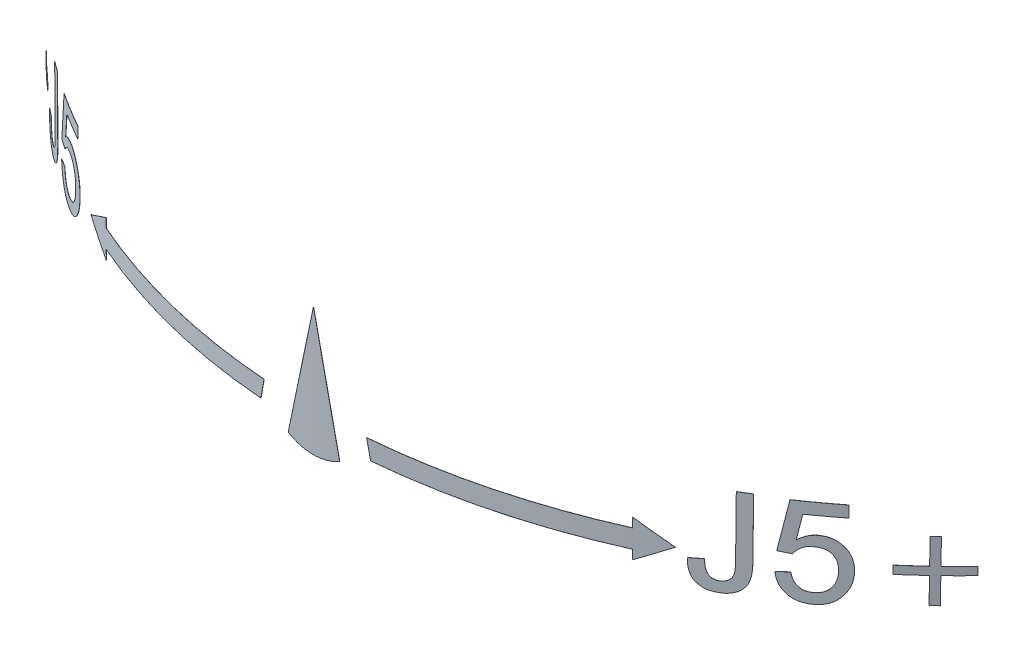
SolidWorks part; units mm, degrees
ref_plane "Front" through (0, 0, 0) normal (0, 0, 1) x (1, 0, 0)
ref_plane "Top" through (0, 0, 0) normal (0, 1, 0) x (1, 0, 0)
ref_plane "Right" through (0, 0, 0) normal (1, 0, 0) x (0, 0, -1)
sketch "Sketch1" plane through (0, 0, 0) normal (0, 0, 1) x (1, 0, 0)
  line L689 (2158.5978, 2717.1989) -> (2178.4903, 2715.586)
  line L690 (2174.7268, 2796.7686) -> (2158.5978, 2717.1989)
  line L691 (2248.3826, 2796.7686) -> (2174.7268, 2796.7686)
  line L692 (2248.3826, 2776.8762) -> (2248.3826, 2796.7686)
  line L693 (2190.8558, 2776.8762) -> (2248.3826, 2776.8762)
  line L694 (2182.7913, 2736.5537) -> (2190.8558, 2776.8762)
  line L695 (2210.7483, 2747.3063) -> (2202.1461, 2746.2311)
  line L696 (2202.1461, 2746.2311) -> (2194.0816, 2743.5429)
  line L697 (2194.0816, 2743.5429) -> (2182.7913, 2736.5537)
  line L698 (2255.9095, 2696.7688) -> (2254.8342, 2710.7473)
  line L699 (2254.8342, 2710.7473) -> (2249.4579, 2724.1881)
  line L700 (2249.4579, 2724.1881) -> (2240.8557, 2734.9408)
  line L701 (2240.8557, 2734.9408) -> (2231.716, 2741.93)
  line L702 (2231.716, 2741.93) -> (2221.5009, 2745.6934)
  line L703 (2221.5009, 2745.6934) -> (2210.7483, 2747.3063)
  line L704 (2244.0815, 2660.7474) -> (2249.9955, 2669.8871)
  line L705 (2249.9955, 2669.8871) -> (2253.7589, 2680.1022)
  line L706 (2253.7589, 2680.1022) -> (2255.9095, 2696.7688)
  line L707 (2204.8343, 2641.9302) -> (2217.7375, 2643.0055)
  line L708 (2217.7375, 2643.0055) -> (2229.5654, 2647.3065)
  line L709 (2229.5654, 2647.3065) -> (2237.6299, 2653.2205)
  line L710 (2237.6299, 2653.2205) -> (2244.0815, 2660.7474)
  line L711 (2156.4473, 2685.4785) -> (2159.6731, 2672.5753)
  line L712 (2159.6731, 2672.5753) -> (2165.5871, 2660.2097)
  line L713 (2165.5871, 2660.2097) -> (2175.2645, 2650.5323)
  line L714 (2175.2645, 2650.5323) -> (2189.2429, 2643.5431)
  line L715 (2189.2429, 2643.5431) -> (2204.8343, 2641.9302)
  line L716 (2176.3397, 2687.629) -> (2156.4473, 2685.4785)
  line L717 (2204.8343, 2659.6721) -> (2196.7698, 2660.7474)
  line L718 (2196.7698, 2660.7474) -> (2189.2429, 2663.9732)
  line L719 (2189.2429, 2663.9732) -> (2183.329, 2669.3495)
  line L720 (2183.329, 2669.3495) -> (2179.0279, 2677.9516)
  line L721 (2179.0279, 2677.9516) -> (2176.3397, 2687.629)
  line L722 (2236.017, 2695.6935) -> (2235.4794, 2685.4785)
  line L723 (2235.4794, 2685.4785) -> (2232.2536, 2676.3387)
  line L724 (2232.2536, 2676.3387) -> (2226.3396, 2667.7366)
  line L725 (2226.3396, 2667.7366) -> (2216.6622, 2661.8226)
  line L726 (2216.6622, 2661.8226) -> (2204.8343, 2659.6721)
  line L727 (2205.3719, 2729.0268) -> (2214.5117, 2727.9515)
  line L728 (2214.5117, 2727.9515) -> (2223.6515, 2724.1881)
  line L729 (2223.6515, 2724.1881) -> (2230.6407, 2717.7365)
  line L730 (2230.6407, 2717.7365) -> (2234.9418, 2706.9838)
  line L731 (2234.9418, 2706.9838) -> (2236.017, 2695.6935)
  line L732 (2178.4903, 2715.586) -> (2184.4042, 2722.0376)
  line L733 (2184.4042, 2722.0376) -> (2191.3935, 2726.8763)
  line L734 (2191.3935, 2726.8763) -> (2198.3827, 2728.4892)
  line L735 (2198.3827, 2728.4892) -> (2205.3719, 2729.0268)
  line L736 (2106.985, 2691.9301) -> (2106.4474, 2681.1774)
  line L737 (2106.4474, 2681.1774) -> (2104.2969, 2670.4248)
  line L738 (2104.2969, 2670.4248) -> (2101.6087, 2666.1237)
  line L739 (2101.6087, 2666.1237) -> (2097.3076, 2662.3603)
  line L740 (2097.3076, 2662.3603) -> (2092.4689, 2660.2097)
  line L741 (2092.4689, 2660.2097) -> (2087.0926, 2659.6721)
  line L742 (2106.985, 2798.9191) -> (2106.985, 2691.9301)
  line L743 (2129.028, 2798.9191) -> (2106.985, 2798.9191)
  line L744 (2129.028, 2693.543) -> (2129.028, 2798.9191)
  line L745 (2086.0173, 2641.9302) -> (2100.5334, 2643.5431)
  line L746 (2100.5334, 2643.5431) -> (2113.4366, 2649.4571)
  line L747 (2113.4366, 2649.4571) -> (2122.5764, 2660.7474)
  line L748 (2122.5764, 2660.7474) -> (2126.8775, 2670.9624)
  line L749 (2126.8775, 2670.9624) -> (2128.4904, 2682.2527)
  line L750 (2128.4904, 2682.2527) -> (2129.028, 2693.543)
  line L751 (2045.1572, 2687.0914) -> (2046.2325, 2674.1882)
  line L752 (2046.2325, 2674.1882) -> (2049.9959, 2661.285)
  line L753 (2049.9959, 2661.285) -> (2057.5228, 2651.07)
  line L754 (2057.5228, 2651.07) -> (2066.1249, 2645.6936)
  line L755 (2066.1249, 2645.6936) -> (2075.8023, 2642.4678)
  line L756 (2075.8023, 2642.4678) -> (2086.0173, 2641.9302)
  line L757 (2067.2002, 2689.2419) -> (2045.1572, 2687.0914)
  line L758 (2087.0926, 2659.6721) -> (2082.2539, 2660.2097)
  line L759 (2082.2539, 2660.2097) -> (2077.4152, 2662.3603)
  line L760 (2077.4152, 2662.3603) -> (2073.6518, 2665.5861)
  line L761 (2073.6518, 2665.5861) -> (2070.9636, 2669.8871)
  line L762 (2070.9636, 2669.8871) -> (2068.2754, 2679.5645)
  line L763 (2068.2754, 2679.5645) -> (2067.2002, 2689.2419)
  line L764 (3388.1653, 2689.2419) -> (3366.1223, 2687.0914)
  line L765 (3408.0577, 2659.6721) -> (3402.6814, 2660.2097)
  line L766 (3402.6814, 2660.2097) -> (3398.3803, 2662.3603)
  line L767 (3398.3803, 2662.3603) -> (3394.0792, 2665.5861)
  line L768 (3394.0792, 2665.5861) -> (3391.3911, 2669.8871)
  line L769 (3391.3911, 2669.8871) -> (3388.7029, 2679.5645)
  line L770 (3388.7029, 2679.5645) -> (3388.1653, 2689.2419)
  line L771 (3427.9501, 2691.9301) -> (3427.4125, 2681.1774)
  line L772 (3427.4125, 2681.1774) -> (3425.262, 2670.4248)
  line L773 (3425.262, 2670.4248) -> (3422.5738, 2666.1237)
  line L774 (3422.5738, 2666.1237) -> (3418.2727, 2662.3603)
  line L775 (3418.2727, 2662.3603) -> (3413.434, 2660.2097)
  line L776 (3413.434, 2660.2097) -> (3408.0577, 2659.6721)
  line L777 (3427.9501, 2798.9191) -> (3427.9501, 2691.9301)
  line L778 (3449.4555, 2798.9191) -> (3427.9501, 2798.9191)
  line L779 (3449.4555, 2693.543) -> (3449.4555, 2798.9191)
  line L780 (3406.9824, 2641.9302) -> (3421.4985, 2643.5431)
  line L781 (3421.4985, 2643.5431) -> (3434.4017, 2649.4571)
  line L782 (3434.4017, 2649.4571) -> (3443.5415, 2660.7474)
  line L783 (3443.5415, 2660.7474) -> (3447.3049, 2670.9624)
  line L784 (3447.3049, 2670.9624) -> (3449.4555, 2682.2527)
  line L785 (3449.4555, 2682.2527) -> (3449.4555, 2693.543)
  line L786 (3366.1223, 2687.0914) -> (3367.1976, 2674.1882)
  line L787 (3367.1976, 2674.1882) -> (3370.961, 2661.285)
  line L788 (3370.961, 2661.285) -> (3378.4879, 2651.07)
  line L789 (3378.4879, 2651.07) -> (3387.09, 2645.6936)
  line L790 (3387.09, 2645.6936) -> (3396.7674, 2642.4678)
  line L791 (3396.7674, 2642.4678) -> (3406.9824, 2641.9302)
  line L792 (3497.3048, 2687.629) -> (3477.4124, 2685.4785)
  line L793 (3525.7994, 2659.6721) -> (3517.7349, 2660.7474)
  line L794 (3517.7349, 2660.7474) -> (3510.208, 2663.9732)
  line L795 (3510.208, 2663.9732) -> (3504.2941, 2669.3495)
  line L796 (3504.2941, 2669.3495) -> (3499.4554, 2677.9516)
  line L797 (3499.4554, 2677.9516) -> (3497.3048, 2687.629)
  line L798 (3556.9821, 2695.6935) -> (3555.9069, 2685.4785)
  line L799 (3555.9069, 2685.4785) -> (3553.2187, 2676.3387)
  line L800 (3553.2187, 2676.3387) -> (3547.3047, 2667.7366)
  line L801 (3547.3047, 2667.7366) -> (3537.6273, 2661.8226)
  line L802 (3537.6273, 2661.8226) -> (3525.7994, 2659.6721)
  line L803 (3525.7994, 2729.0268) -> (3535.4768, 2727.9515)
  line L804 (3535.4768, 2727.9515) -> (3544.6166, 2724.1881)
  line L805 (3544.6166, 2724.1881) -> (3551.0682, 2717.7365)
  line L806 (3551.0682, 2717.7365) -> (3555.9069, 2706.9838)
  line L807 (3555.9069, 2706.9838) -> (3556.9821, 2695.6935)
  line L808 (3499.4554, 2715.586) -> (3505.3693, 2722.0376)
  line L809 (3505.3693, 2722.0376) -> (3512.3586, 2726.8763)
  line L810 (3512.3586, 2726.8763) -> (3518.8102, 2728.4892)
  line L811 (3518.8102, 2728.4892) -> (3525.7994, 2729.0268)
  line L812 (3479.5629, 2717.1989) -> (3499.4554, 2715.586)
  line L813 (3495.1543, 2796.7686) -> (3479.5629, 2717.1989)
  line L814 (3568.8101, 2796.7686) -> (3495.1543, 2796.7686)
  line L815 (3568.8101, 2776.8762) -> (3568.8101, 2796.7686)
  line L816 (3511.8209, 2776.8762) -> (3568.8101, 2776.8762)
  line L817 (3503.7564, 2736.5537) -> (3511.8209, 2776.8762)
  line L818 (3531.1757, 2747.3063) -> (3523.1112, 2746.2311)
  line L819 (3523.1112, 2746.2311) -> (3515.0467, 2743.5429)
  line L820 (3515.0467, 2743.5429) -> (3503.7564, 2736.5537)
  line L821 (3576.8746, 2696.7688) -> (3575.2617, 2710.7473)
  line L822 (3575.2617, 2710.7473) -> (3570.423, 2724.1881)
  line L823 (3570.423, 2724.1881) -> (3561.8208, 2734.9408)
  line L824 (3561.8208, 2734.9408) -> (3552.6811, 2741.93)
  line L825 (3552.6811, 2741.93) -> (3542.466, 2745.6934)
  line L826 (3542.466, 2745.6934) -> (3531.1757, 2747.3063)
  line L827 (3565.0466, 2660.7474) -> (3570.9606, 2669.8871)
  line L828 (3570.9606, 2669.8871) -> (3574.724, 2680.1022)
  line L829 (3574.724, 2680.1022) -> (3576.8746, 2696.7688)
  line L830 (3525.7994, 2641.9302) -> (3538.165, 2643.0055)
  line L831 (3538.165, 2643.0055) -> (3549.9929, 2647.3065)
  line L832 (3549.9929, 2647.3065) -> (3558.0574, 2653.2205)
  line L833 (3558.0574, 2653.2205) -> (3565.0466, 2660.7474)
  line L834 (3477.4124, 2685.4785) -> (3480.1006, 2672.5753)
  line L835 (3480.1006, 2672.5753) -> (3486.5522, 2660.2097)
  line L836 (3486.5522, 2660.2097) -> (3495.6919, 2650.5323)
  line L837 (3495.6919, 2650.5323) -> (3510.208, 2643.5431)
  line L838 (3510.208, 2643.5431) -> (3525.7994, 2641.9302)
  line L839 (2826.8761, 2872.0373) -> (2782.2525, 2659.6721)
  line L840 (2871.4996, 2659.6721) -> (2826.8761, 2872.0373)
  line L841 (2782.2525, 2659.6721) -> (2782.7901, 2659.1345)
  line L842 (2782.7901, 2659.1345) -> (2783.8654, 2659.1345)
  line L843 (2783.8654, 2659.1345) -> (2784.9407, 2658.5968)
  line L844 (2784.9407, 2658.5968) -> (2786.0159, 2658.0592)
  line L845 (2786.0159, 2658.0592) -> (2787.0912, 2657.5216)
  line L846 (2787.0912, 2657.5216) -> (2788.1665, 2656.9839)
  line L847 (2788.1665, 2656.9839) -> (2789.2417, 2656.4463)
  line L848 (2789.2417, 2656.4463) -> (2789.7794, 2655.9087)
  line L849 (2789.7794, 2655.9087) -> (2790.8546, 2655.371)
  line L850 (2790.8546, 2655.371) -> (2791.9299, 2654.8334)
  line L851 (2791.9299, 2654.8334) -> (2793.0052, 2654.8334)
  line L852 (2793.0052, 2654.8334) -> (2794.0804, 2654.2958)
  line L853 (2794.0804, 2654.2958) -> (2795.1557, 2653.7581)
  line L854 (2795.1557, 2653.7581) -> (2796.231, 2653.2205)
  line L855 (2796.231, 2653.2205) -> (2797.3062, 2653.2205)
  line L856 (2797.3062, 2653.2205) -> (2798.3815, 2652.6829)
  line L857 (2798.3815, 2652.6829) -> (2799.4568, 2652.6829)
  line L858 (2799.4568, 2652.6829) -> (2800.532, 2652.1452)
  line L859 (2800.532, 2652.1452) -> (2801.6073, 2651.6076)
  line L860 (2801.6073, 2651.6076) -> (2802.6826, 2651.6076)
  line L861 (2802.6826, 2651.6076) -> (2803.7578, 2651.07)
  line L862 (2803.7578, 2651.07) -> (2804.8331, 2651.07)
  line L863 (2804.8331, 2651.07) -> (2805.9084, 2650.5323)
  line L864 (2805.9084, 2650.5323) -> (2806.9836, 2650.5323)
  line L865 (2806.9836, 2650.5323) -> (2808.0589, 2649.9947)
  line L866 (2808.0589, 2649.9947) -> (2810.2094, 2649.9947)
  line L867 (2810.2094, 2649.9947) -> (2811.2847, 2649.4571)
  line L868 (2811.2847, 2649.4571) -> (2813.4352, 2649.4571)
  line L869 (2813.4352, 2649.4571) -> (2814.5105, 2648.9194)
  line L870 (2814.5105, 2648.9194) -> (2818.2739, 2648.9194)
  line L871 (2818.2739, 2648.9194) -> (2819.3492, 2648.3818)
  line L872 (2819.3492, 2648.3818) -> (2833.8653, 2648.3818)
  line L873 (2833.8653, 2648.3818) -> (2834.9406, 2648.9194)
  line L874 (2834.9406, 2648.9194) -> (2839.2416, 2648.9194)
  line L875 (2839.2416, 2648.9194) -> (2840.3169, 2649.4571)
  line L876 (2840.3169, 2649.4571) -> (2842.4674, 2649.4571)
  line L877 (2842.4674, 2649.4571) -> (2843.5427, 2649.9947)
  line L878 (2843.5427, 2649.9947) -> (2844.618, 2649.9947)
  line L879 (2844.618, 2649.9947) -> (2845.6932, 2650.5323)
  line L880 (2845.6932, 2650.5323) -> (2846.7685, 2650.5323)
  line L881 (2846.7685, 2650.5323) -> (2847.8438, 2651.07)
  line L882 (2847.8438, 2651.07) -> (2848.919, 2651.07)
  line L883 (2848.919, 2651.07) -> (2849.9943, 2651.6076)
  line L884 (2849.9943, 2651.6076) -> (2851.0696, 2651.6076)
  line L885 (2851.0696, 2651.6076) -> (2852.1448, 2652.1452)
  line L886 (2852.1448, 2652.1452) -> (2853.2201, 2652.1452)
  line L887 (2853.2201, 2652.1452) -> (2854.2954, 2652.6829)
  line L888 (2854.2954, 2652.6829) -> (2855.3706, 2653.2205)
  line L889 (2855.3706, 2653.2205) -> (2856.4459, 2653.2205)
  line L890 (2856.4459, 2653.2205) -> (2857.5212, 2653.7581)
  line L891 (2857.5212, 2653.7581) -> (2858.5964, 2654.2958)
  line L892 (2858.5964, 2654.2958) -> (2859.6717, 2654.2958)
  line L893 (2859.6717, 2654.2958) -> (2860.747, 2654.8334)
  line L894 (2860.747, 2654.8334) -> (2861.8222, 2655.371)
  line L895 (2861.8222, 2655.371) -> (2862.8975, 2655.9087)
  line L896 (2862.8975, 2655.9087) -> (2863.9728, 2656.4463)
  line L897 (2863.9728, 2656.4463) -> (2865.048, 2656.9839)
  line L898 (2865.048, 2656.9839) -> (2866.1233, 2656.9839)
  line L899 (2866.1233, 2656.9839) -> (2867.1986, 2657.5216)
  line L900 (2867.1986, 2657.5216) -> (2867.7362, 2658.0592)
  line L901 (2867.7362, 2658.0592) -> (2868.8115, 2658.5968)
  line L902 (2868.8115, 2658.5968) -> (2869.8867, 2659.1345)
  line L903 (2869.8867, 2659.1345) -> (2870.962, 2659.6721)
  line L904 (2870.962, 2659.6721) -> (2871.4996, 2659.6721)
  line L905 (3296.7676, 2732.2526) -> (3296.7676, 2716.1236)
  line L906 (3296.7676, 2667.7366) -> (3352.6815, 2699.9946)
  line L907 (3296.7676, 2683.8656) -> (3296.7676, 2667.7366)
  line L908 (2922.0372, 2683.8656) -> (3296.7676, 2683.8656)
  line L909 (2915.5856, 2716.1236) -> (2922.0372, 2683.8656)
  line L910 (3296.7676, 2716.1236) -> (2915.5856, 2716.1236)
  line L911 (3352.6815, 2699.9946) -> (3296.7676, 2732.2526)
  line L912 (2301.0707, 2699.9946) -> (2356.9845, 2667.7366)
  line L913 (2356.9845, 2732.2526) -> (2301.0707, 2699.9946)
  line L914 (2356.9845, 2716.1236) -> (2356.9845, 2732.2526)
  line L915 (2731.715, 2684.4032) -> (2737.6289, 2716.1236)
  line L916 (2356.9845, 2684.4032) -> (2731.715, 2684.4032)
  line L917 (2737.6289, 2716.1236) -> (2356.9845, 2716.1236)
  line L918 (2356.9845, 2667.7366) -> (2356.9845, 2684.4032)
  line L919 (2013.9745, 2691.9301) -> (2013.9745, 2710.2096)
  line L920 (1944.6198, 2710.2096) -> (1944.6198, 2691.9301)
  line L921 (1944.6198, 2691.9301) -> (2013.9745, 2691.9301)
  line L922 (2013.9745, 2710.2096) -> (1944.6198, 2710.2096)
  line L923 (3685.4765, 2710.2096) -> (3685.4765, 2755.3708)
  line L924 (3671.498, 2696.2312) -> (3671.498, 2650.5323)
  line L925 (3731.1753, 2710.2096) -> (3685.4765, 2710.2096)
  line L926 (3685.4765, 2696.2312) -> (3731.1753, 2696.2312)
  line L927 (3671.498, 2755.3708) -> (3671.498, 2710.2096)
  line L928 (3626.3368, 2710.2096) -> (3626.3368, 2696.2312)
  line L929 (3685.4765, 2650.5323) -> (3685.4765, 2696.2312)
  line L930 (3626.3368, 2696.2312) -> (3671.498, 2696.2312)
  line L931 (3685.4765, 2755.3708) -> (3671.498, 2755.3708)
  line L932 (3731.1753, 2696.2312) -> (3731.1753, 2710.2096)
  line L933 (3671.498, 2650.5323) -> (3685.4765, 2650.5323)
  line L934 (3671.498, 2710.2096) -> (3626.3368, 2710.2096)
  line L3482 (2826.8761, 2872.0373) -> (2782.2525, 2659.6721)
  line L3483 (2782.2525, 2659.6721) -> (2784.403, 2658.0592)
  line L3484 (2784.403, 2658.0592) -> (2787.0912, 2656.9839)
  line L3485 (2787.0912, 2656.9839) -> (2789.7794, 2655.9087)
  line L3486 (2789.7794, 2655.9087) -> (2792.4675, 2654.8334)
  line L3487 (2792.4675, 2654.8334) -> (2795.1557, 2653.7581)
  line L3488 (2795.1557, 2653.7581) -> (2797.8439, 2652.6829)
  line L3489 (2797.8439, 2652.6829) -> (2801.0697, 2651.6076)
  line L3490 (2801.0697, 2651.6076) -> (2803.7578, 2651.07)
  line L3491 (2803.7578, 2651.07) -> (2806.446, 2649.9947)
  line L3492 (2806.446, 2649.9947) -> (2809.1342, 2649.4571)
  line L3493 (2809.1342, 2649.4571) -> (2812.36, 2648.9194)
  line L3494 (2812.36, 2648.9194) -> (2815.0481, 2648.3818)
  line L3495 (2815.0481, 2648.3818) -> (2818.2739, 2648.3818)
  line L3496 (2818.2739, 2648.3818) -> (2820.9621, 2647.8442)
  line L3497 (2820.9621, 2647.8442) -> (2832.79, 2647.8442)
  line L3498 (2832.79, 2647.8442) -> (2835.4782, 2648.3818)
  line L3499 (2835.4782, 2648.3818) -> (2838.704, 2648.3818)
  line L3500 (2838.704, 2648.3818) -> (2841.3922, 2648.9194)
  line L3501 (2841.3922, 2648.9194) -> (2844.0803, 2649.4571)
  line L3502 (2844.0803, 2649.4571) -> (2847.3061, 2649.9947)
  line L3503 (2847.3061, 2649.9947) -> (2849.9943, 2651.07)
  line L3504 (2849.9943, 2651.07) -> (2852.6825, 2651.6076)
  line L3505 (2852.6825, 2651.6076) -> (2855.3706, 2652.6829)
  line L3506 (2855.3706, 2652.6829) -> (2858.0588, 2653.7581)
  line L3507 (2858.0588, 2653.7581) -> (2861.2846, 2654.8334)
  line L3508 (2861.2846, 2654.8334) -> (2863.9728, 2655.9087)
  line L3509 (2863.9728, 2655.9087) -> (2866.6609, 2656.9839)
  line L3510 (2866.6609, 2656.9839) -> (2868.8115, 2658.0592)
  line L3511 (2868.8115, 2658.0592) -> (2871.4996, 2659.6721)
  line L3512 (2871.4996, 2659.6721) -> (2826.8761, 2872.0373)
  line L3513 (2826.8761, 2872.0373) -> (2782.2525, 2659.6721)
  line L3514 (2782.2525, 2659.6721) -> (2784.403, 2658.0592)
  line L3515 (2784.403, 2658.0592) -> (2787.0912, 2656.9839)
  line L3516 (2787.0912, 2656.9839) -> (2789.7794, 2655.9087)
  line L3517 (2789.7794, 2655.9087) -> (2792.4675, 2654.8334)
  line L3518 (2792.4675, 2654.8334) -> (2795.1557, 2653.7581)
  line L3519 (2795.1557, 2653.7581) -> (2797.8439, 2652.6829)
  line L3520 (2797.8439, 2652.6829) -> (2801.0697, 2651.6076)
  line L3521 (2801.0697, 2651.6076) -> (2803.7578, 2651.07)
  line L3522 (2803.7578, 2651.07) -> (2806.446, 2649.9947)
  line L3523 (2806.446, 2649.9947) -> (2809.1342, 2649.4571)
  line L3524 (2809.1342, 2649.4571) -> (2812.36, 2648.9194)
  line L3525 (2812.36, 2648.9194) -> (2815.0481, 2648.3818)
  line L3526 (2815.0481, 2648.3818) -> (2818.2739, 2648.3818)
  line L3527 (2818.2739, 2648.3818) -> (2820.9621, 2647.8442)
  line L3528 (2820.9621, 2647.8442) -> (2832.79, 2647.8442)
  line L3529 (2832.79, 2647.8442) -> (2835.4782, 2648.3818)
  line L3530 (2835.4782, 2648.3818) -> (2838.704, 2648.3818)
  line L3531 (2838.704, 2648.3818) -> (2841.3922, 2648.9194)
  line L3532 (2841.3922, 2648.9194) -> (2844.0803, 2649.4571)
  line L3533 (2844.0803, 2649.4571) -> (2847.3061, 2649.9947)
  line L3534 (2847.3061, 2649.9947) -> (2849.9943, 2651.07)
  line L3535 (2849.9943, 2651.07) -> (2852.6825, 2651.6076)
  line L3536 (2852.6825, 2651.6076) -> (2855.3706, 2652.6829)
  line L3537 (2855.3706, 2652.6829) -> (2858.0588, 2653.7581)
  line L3538 (2858.0588, 2653.7581) -> (2861.2846, 2654.8334)
  line L3539 (2861.2846, 2654.8334) -> (2863.9728, 2655.9087)
  line L3540 (2863.9728, 2655.9087) -> (2866.6609, 2656.9839)
  line L3541 (2866.6609, 2656.9839) -> (2868.8115, 2658.0592)
  line L3542 (2868.8115, 2658.0592) -> (2871.4996, 2659.6721)
  line L3543 (2871.4996, 2659.6721) -> (2826.8761, 2872.0373)
  line L3544 (1944.6198, 2691.9301) -> (2013.9745, 2691.9301)
  line L3545 (2013.9745, 2691.9301) -> (2013.9745, 2710.2096)
  line L3546 (2013.9745, 2710.2096) -> (1944.6198, 2710.2096)
  line L3547 (1944.6198, 2710.2096) -> (1944.6198, 2691.9301)
  line L3548 (1944.6198, 2691.9301) -> (2013.9745, 2691.9301)
  line L3549 (2013.9745, 2691.9301) -> (2013.9745, 2710.2096)
  line L3550 (2013.9745, 2710.2096) -> (1944.6198, 2710.2096)
  line L3551 (1944.6198, 2710.2096) -> (1944.6198, 2691.9301)
  line L3552 (2106.985, 2691.9301) -> (2106.985, 2682.7903)
  line L3553 (2106.985, 2682.7903) -> (2106.4474, 2680.1022)
  line L3554 (2106.4474, 2680.1022) -> (2106.4474, 2678.4893)
  line L3555 (2106.4474, 2678.4893) -> (2105.9098, 2676.8764)
  line L3556 (2105.9098, 2676.8764) -> (2105.9098, 2675.2635)
  line L3557 (2105.9098, 2675.2635) -> (2105.3721, 2673.6506)
  line L3558 (2105.3721, 2673.6506) -> (2104.8345, 2672.0377)
  line L3559 (2104.8345, 2672.0377) -> (2104.2969, 2670.4248)
  line L3560 (2104.2969, 2670.4248) -> (2103.7592, 2669.3495)
  line L3561 (2103.7592, 2669.3495) -> (2103.2216, 2668.2742)
  line L3562 (2103.2216, 2668.2742) -> (2102.684, 2667.199)
  line L3563 (2102.684, 2667.199) -> (2101.6087, 2666.1237)
  line L3564 (2101.6087, 2666.1237) -> (2100.5334, 2665.0484)
  line L3565 (2100.5334, 2665.0484) -> (2099.4582, 2663.9732)
  line L3566 (2099.4582, 2663.9732) -> (2098.3829, 2663.4355)
  line L3567 (2098.3829, 2663.4355) -> (2097.3076, 2662.3603)
  line L3568 (2097.3076, 2662.3603) -> (2096.2324, 2661.8226)
  line L3569 (2096.2324, 2661.8226) -> (2094.6195, 2661.285)
  line L3570 (2094.6195, 2661.285) -> (2093.5442, 2660.7474)
  line L3571 (2093.5442, 2660.7474) -> (2091.9313, 2660.2097)
  line L3572 (2091.9313, 2660.2097) -> (2090.856, 2659.6721)
  line L3573 (2090.856, 2659.6721) -> (2084.4044, 2659.6721)
  line L3574 (2084.4044, 2659.6721) -> (2082.7915, 2660.2097)
  line L3575 (2082.7915, 2660.2097) -> (2081.1786, 2660.2097)
  line L3576 (2081.1786, 2660.2097) -> (2080.1034, 2660.7474)
  line L3577 (2080.1034, 2660.7474) -> (2078.4905, 2661.285)
  line L3578 (2078.4905, 2661.285) -> (2077.4152, 2662.3603)
  line L3579 (2077.4152, 2662.3603) -> (2076.3399, 2662.8979)
  line L3580 (2076.3399, 2662.8979) -> (2075.2647, 2663.9732)
  line L3581 (2075.2647, 2663.9732) -> (2074.1894, 2665.0484)
  line L3582 (2074.1894, 2665.0484) -> (2073.1141, 2666.1237)
  line L3583 (2073.1141, 2666.1237) -> (2072.0389, 2667.199)
  line L3584 (2072.0389, 2667.199) -> (2071.5012, 2668.2742)
  line L3585 (2071.5012, 2668.2742) -> (2070.9636, 2669.8871)
  line L3586 (2070.9636, 2669.8871) -> (2069.8883, 2671.5)
  line L3587 (2069.8883, 2671.5) -> (2069.3507, 2673.1129)
  line L3588 (2069.3507, 2673.1129) -> (2068.8131, 2675.2635)
  line L3589 (2068.8131, 2675.2635) -> (2068.8131, 2676.8764)
  line L3590 (2068.8131, 2676.8764) -> (2068.2754, 2678.4893)
  line L3591 (2068.2754, 2678.4893) -> (2067.7378, 2680.6398)
  line L3592 (2067.7378, 2680.6398) -> (2067.7378, 2683.328)
  line L3593 (2067.7378, 2683.328) -> (2067.2002, 2686.5538)
  line L3594 (2067.2002, 2686.5538) -> (2067.2002, 2689.2419)
  line L3595 (2067.2002, 2689.2419) -> (2045.1572, 2687.0914)
  line L3596 (2045.1572, 2687.0914) -> (2045.1572, 2683.8656)
  line L3597 (2045.1572, 2683.8656) -> (2045.6948, 2680.6398)
  line L3598 (2045.6948, 2680.6398) -> (2045.6948, 2677.414)
  line L3599 (2045.6948, 2677.414) -> (2046.2325, 2674.7258)
  line L3600 (2046.2325, 2674.7258) -> (2046.7701, 2671.5)
  line L3601 (2046.7701, 2671.5) -> (2047.3077, 2668.2742)
  line L3602 (2047.3077, 2668.2742) -> (2048.383, 2665.5861)
  line L3603 (2048.383, 2665.5861) -> (2049.4583, 2662.8979)
  line L3604 (2049.4583, 2662.8979) -> (2049.9959, 2660.7474)
  line L3605 (2049.9959, 2660.7474) -> (2051.6088, 2658.5968)
  line L3606 (2051.6088, 2658.5968) -> (2052.6841, 2656.4463)
  line L3607 (2052.6841, 2656.4463) -> (2054.297, 2654.8334)
  line L3608 (2054.297, 2654.8334) -> (2055.9099, 2652.6829)
  line L3609 (2055.9099, 2652.6829) -> (2057.5228, 2651.07)
  line L3610 (2057.5228, 2651.07) -> (2059.6733, 2649.4571)
  line L3611 (2059.6733, 2649.4571) -> (2061.2862, 2648.3818)
  line L3612 (2061.2862, 2648.3818) -> (2063.4367, 2646.7689)
  line L3613 (2063.4367, 2646.7689) -> (2065.5873, 2645.6936)
  line L3614 (2065.5873, 2645.6936) -> (2068.2754, 2644.6184)
  line L3615 (2068.2754, 2644.6184) -> (2070.426, 2644.0807)
  line L3616 (2070.426, 2644.0807) -> (2072.5765, 2643.0055)
  line L3617 (2072.5765, 2643.0055) -> (2075.2647, 2642.4678)
  line L3618 (2075.2647, 2642.4678) -> (2077.9528, 2642.4678)
  line L3619 (2077.9528, 2642.4678) -> (2080.641, 2641.9302)
  line L3620 (2080.641, 2641.9302) -> (2091.3937, 2641.9302)
  line L3621 (2091.3937, 2641.9302) -> (2094.0818, 2642.4678)
  line L3622 (2094.0818, 2642.4678) -> (2096.77, 2643.0055)
  line L3623 (2096.77, 2643.0055) -> (2099.4582, 2643.5431)
  line L3624 (2099.4582, 2643.5431) -> (2102.1463, 2644.0807)
  line L3625 (2102.1463, 2644.0807) -> (2104.8345, 2645.156)
  line L3626 (2104.8345, 2645.156) -> (2106.985, 2646.2313)
  line L3627 (2106.985, 2646.2313) -> (2109.6732, 2647.3065)
  line L3628 (2109.6732, 2647.3065) -> (2111.8237, 2648.3818)
  line L3629 (2111.8237, 2648.3818) -> (2113.9743, 2649.9947)
  line L3630 (2113.9743, 2649.9947) -> (2116.1248, 2652.1452)
  line L3631 (2116.1248, 2652.1452) -> (2118.2753, 2653.7581)
  line L3632 (2118.2753, 2653.7581) -> (2119.8882, 2655.9087)
  line L3633 (2119.8882, 2655.9087) -> (2121.5011, 2658.0592)
  line L3634 (2121.5011, 2658.0592) -> (2122.5764, 2660.7474)
  line L3635 (2122.5764, 2660.7474) -> (2124.1893, 2662.8979)
  line L3636 (2124.1893, 2662.8979) -> (2125.2646, 2665.5861)
  line L3637 (2125.2646, 2665.5861) -> (2125.8022, 2668.2742)
  line L3638 (2125.8022, 2668.2742) -> (2126.3398, 2670.4248)
  line L3639 (2126.3398, 2670.4248) -> (2127.4151, 2673.1129)
  line L3640 (2127.4151, 2673.1129) -> (2127.4151, 2675.8011)
  line L3641 (2127.4151, 2675.8011) -> (2127.9527, 2678.4893)
  line L3642 (2127.9527, 2678.4893) -> (2128.4904, 2682.2527)
  line L3643 (2128.4904, 2682.2527) -> (2128.4904, 2686.0161)
  line L3644 (2128.4904, 2686.0161) -> (2129.028, 2689.7796)
  line L3645 (2129.028, 2689.7796) -> (2129.028, 2798.9191)
  line L3646 (2129.028, 2798.9191) -> (2106.985, 2798.9191)
  line L3647 (2106.985, 2798.9191) -> (2106.985, 2691.9301)
  line L3648 (2106.985, 2691.9301) -> (2106.985, 2682.7903)
  line L3649 (2106.985, 2682.7903) -> (2106.4474, 2680.1022)
  line L3650 (2106.4474, 2680.1022) -> (2106.4474, 2678.4893)
  line L3651 (2106.4474, 2678.4893) -> (2105.9098, 2676.8764)
  line L3652 (2105.9098, 2676.8764) -> (2105.9098, 2675.2635)
  line L3653 (2105.9098, 2675.2635) -> (2105.3721, 2673.6506)
  line L3654 (2105.3721, 2673.6506) -> (2104.8345, 2672.0377)
  line L3655 (2104.8345, 2672.0377) -> (2104.2969, 2670.4248)
  line L3656 (2104.2969, 2670.4248) -> (2103.7592, 2669.3495)
  line L3657 (2103.7592, 2669.3495) -> (2103.2216, 2668.2742)
  line L3658 (2103.2216, 2668.2742) -> (2102.684, 2667.199)
  line L3659 (2102.684, 2667.199) -> (2101.6087, 2666.1237)
  line L3660 (2101.6087, 2666.1237) -> (2100.5334, 2665.0484)
  line L3661 (2100.5334, 2665.0484) -> (2099.4582, 2663.9732)
  line L3662 (2099.4582, 2663.9732) -> (2098.3829, 2663.4355)
  line L3663 (2098.3829, 2663.4355) -> (2097.3076, 2662.3603)
  line L3664 (2097.3076, 2662.3603) -> (2096.2324, 2661.8226)
  line L3665 (2096.2324, 2661.8226) -> (2094.6195, 2661.285)
  line L3666 (2094.6195, 2661.285) -> (2093.5442, 2660.7474)
  line L3667 (2093.5442, 2660.7474) -> (2091.9313, 2660.2097)
  line L3668 (2091.9313, 2660.2097) -> (2090.856, 2659.6721)
  line L3669 (2090.856, 2659.6721) -> (2084.4044, 2659.6721)
  line L3670 (2084.4044, 2659.6721) -> (2082.7915, 2660.2097)
  line L3671 (2082.7915, 2660.2097) -> (2081.1786, 2660.2097)
  line L3672 (2081.1786, 2660.2097) -> (2080.1034, 2660.7474)
  line L3673 (2080.1034, 2660.7474) -> (2078.4905, 2661.285)
  line L3674 (2078.4905, 2661.285) -> (2077.4152, 2662.3603)
  line L3675 (2077.4152, 2662.3603) -> (2076.3399, 2662.8979)
  line L3676 (2076.3399, 2662.8979) -> (2075.2647, 2663.9732)
  line L3677 (2075.2647, 2663.9732) -> (2074.1894, 2665.0484)
  line L3678 (2074.1894, 2665.0484) -> (2073.1141, 2666.1237)
  line L3679 (2073.1141, 2666.1237) -> (2072.0389, 2667.199)
  line L3680 (2072.0389, 2667.199) -> (2071.5012, 2668.2742)
  line L3681 (2071.5012, 2668.2742) -> (2070.9636, 2669.8871)
  line L3682 (2070.9636, 2669.8871) -> (2069.8883, 2671.5)
  line L3683 (2069.8883, 2671.5) -> (2069.3507, 2673.1129)
  line L3684 (2069.3507, 2673.1129) -> (2068.8131, 2675.2635)
  line L3685 (2068.8131, 2675.2635) -> (2068.8131, 2676.8764)
  line L3686 (2068.8131, 2676.8764) -> (2068.2754, 2678.4893)
  line L3687 (2068.2754, 2678.4893) -> (2067.7378, 2680.6398)
  line L3688 (2067.7378, 2680.6398) -> (2067.7378, 2683.328)
  line L3689 (2067.7378, 2683.328) -> (2067.2002, 2686.5538)
  line L3690 (2067.2002, 2686.5538) -> (2067.2002, 2689.2419)
  line L3691 (2067.2002, 2689.2419) -> (2045.1572, 2687.0914)
  line L3692 (2045.1572, 2687.0914) -> (2045.1572, 2683.8656)
  line L3693 (2045.1572, 2683.8656) -> (2045.6948, 2680.6398)
  line L3694 (2045.6948, 2680.6398) -> (2045.6948, 2677.414)
  line L3695 (2045.6948, 2677.414) -> (2046.2325, 2674.7258)
  line L3696 (2046.2325, 2674.7258) -> (2046.7701, 2671.5)
  line L3697 (2046.7701, 2671.5) -> (2047.3077, 2668.2742)
  line L3698 (2047.3077, 2668.2742) -> (2048.383, 2665.5861)
  line L3699 (2048.383, 2665.5861) -> (2049.4583, 2662.8979)
  line L3700 (2049.4583, 2662.8979) -> (2049.9959, 2660.7474)
  line L3701 (2049.9959, 2660.7474) -> (2051.6088, 2658.5968)
  line L3702 (2051.6088, 2658.5968) -> (2052.6841, 2656.4463)
  line L3703 (2052.6841, 2656.4463) -> (2054.297, 2654.8334)
  line L3704 (2054.297, 2654.8334) -> (2055.9099, 2652.6829)
  line L3705 (2055.9099, 2652.6829) -> (2057.5228, 2651.07)
  line L3706 (2057.5228, 2651.07) -> (2059.6733, 2649.4571)
  line L3707 (2059.6733, 2649.4571) -> (2061.2862, 2648.3818)
  line L3708 (2061.2862, 2648.3818) -> (2063.4367, 2646.7689)
  line L3709 (2063.4367, 2646.7689) -> (2065.5873, 2645.6936)
  line L3710 (2065.5873, 2645.6936) -> (2068.2754, 2644.6184)
  line L3711 (2068.2754, 2644.6184) -> (2070.426, 2644.0807)
  line L3712 (2070.426, 2644.0807) -> (2072.5765, 2643.0055)
  line L3713 (2072.5765, 2643.0055) -> (2075.2647, 2642.4678)
  line L3714 (2075.2647, 2642.4678) -> (2077.9528, 2642.4678)
  line L3715 (2077.9528, 2642.4678) -> (2080.641, 2641.9302)
  line L3716 (2080.641, 2641.9302) -> (2091.3937, 2641.9302)
  line L3717 (2091.3937, 2641.9302) -> (2094.0818, 2642.4678)
  line L3718 (2094.0818, 2642.4678) -> (2096.77, 2643.0055)
  line L3719 (2096.77, 2643.0055) -> (2099.4582, 2643.5431)
  line L3720 (2099.4582, 2643.5431) -> (2102.1463, 2644.0807)
  line L3721 (2102.1463, 2644.0807) -> (2104.8345, 2645.156)
  line L3722 (2104.8345, 2645.156) -> (2106.985, 2646.2313)
  line L3723 (2106.985, 2646.2313) -> (2109.6732, 2647.3065)
  line L3724 (2109.6732, 2647.3065) -> (2111.8237, 2648.3818)
  line L3725 (2111.8237, 2648.3818) -> (2113.9743, 2649.9947)
  line L3726 (2113.9743, 2649.9947) -> (2116.1248, 2652.1452)
  line L3727 (2116.1248, 2652.1452) -> (2118.2753, 2653.7581)
  line L3728 (2118.2753, 2653.7581) -> (2119.8882, 2655.9087)
  line L3729 (2119.8882, 2655.9087) -> (2121.5011, 2658.0592)
  line L3730 (2121.5011, 2658.0592) -> (2122.5764, 2660.7474)
  line L3731 (2122.5764, 2660.7474) -> (2124.1893, 2662.8979)
  line L3732 (2124.1893, 2662.8979) -> (2125.2646, 2665.5861)
  line L3733 (2125.2646, 2665.5861) -> (2125.8022, 2668.2742)
  line L3734 (2125.8022, 2668.2742) -> (2126.3398, 2670.4248)
  line L3735 (2126.3398, 2670.4248) -> (2127.4151, 2673.1129)
  line L3736 (2127.4151, 2673.1129) -> (2127.4151, 2675.8011)
  line L3737 (2127.4151, 2675.8011) -> (2127.9527, 2678.4893)
  line L3738 (2127.9527, 2678.4893) -> (2128.4904, 2682.2527)
  line L3739 (2128.4904, 2682.2527) -> (2128.4904, 2686.0161)
  line L3740 (2128.4904, 2686.0161) -> (2129.028, 2689.7796)
  line L3741 (2129.028, 2689.7796) -> (2129.028, 2798.9191)
  line L3742 (2129.028, 2798.9191) -> (2106.985, 2798.9191)
  line L3743 (2106.985, 2798.9191) -> (2106.985, 2691.9301)
  line L3744 (2158.5978, 2717.1989) -> (2178.4903, 2715.586)
  line L3745 (2178.4903, 2715.586) -> (2179.5655, 2716.6612)
  line L3746 (2179.5655, 2716.6612) -> (2180.1032, 2717.7365)
  line L3747 (2180.1032, 2717.7365) -> (2181.1784, 2718.8118)
  line L3748 (2181.1784, 2718.8118) -> (2182.2537, 2719.887)
  line L3749 (2182.2537, 2719.887) -> (2182.7913, 2720.9623)
  line L3750 (2182.7913, 2720.9623) -> (2183.8666, 2721.4999)
  line L3751 (2183.8666, 2721.4999) -> (2184.9419, 2722.5752)
  line L3752 (2184.9419, 2722.5752) -> (2186.5548, 2723.6505)
  line L3753 (2186.5548, 2723.6505) -> (2187.63, 2724.7257)
  line L3754 (2187.63, 2724.7257) -> (2188.7053, 2725.2634)
  line L3755 (2188.7053, 2725.2634) -> (2190.3182, 2725.801)
  line L3756 (2190.3182, 2725.801) -> (2191.3935, 2726.8763)
  line L3757 (2191.3935, 2726.8763) -> (2193.0064, 2727.4139)
  line L3758 (2193.0064, 2727.4139) -> (2194.6193, 2727.9515)
  line L3759 (2194.6193, 2727.9515) -> (2196.2322, 2727.9515)
  line L3760 (2196.2322, 2727.9515) -> (2197.3074, 2728.4892)
  line L3761 (2197.3074, 2728.4892) -> (2198.9203, 2729.0268)
  line L3762 (2198.9203, 2729.0268) -> (2209.673, 2729.0268)
  line L3763 (2209.673, 2729.0268) -> (2211.8235, 2728.4892)
  line L3764 (2211.8235, 2728.4892) -> (2213.9741, 2728.4892)
  line L3765 (2213.9741, 2728.4892) -> (2216.1246, 2727.9515)
  line L3766 (2216.1246, 2727.9515) -> (2217.7375, 2727.4139)
  line L3767 (2217.7375, 2727.4139) -> (2219.3504, 2726.8763)
  line L3768 (2219.3504, 2726.8763) -> (2220.9633, 2725.801)
  line L3769 (2220.9633, 2725.801) -> (2222.5762, 2725.2634)
  line L3770 (2222.5762, 2725.2634) -> (2224.1891, 2724.1881)
  line L3771 (2224.1891, 2724.1881) -> (2225.802, 2723.1128)
  line L3772 (2225.802, 2723.1128) -> (2226.8773, 2722.0376)
  line L3773 (2226.8773, 2722.0376) -> (2227.9525, 2720.4247)
  line L3774 (2227.9525, 2720.4247) -> (2229.5654, 2718.8118)
  line L3775 (2229.5654, 2718.8118) -> (2230.6407, 2717.7365)
  line L3776 (2230.6407, 2717.7365) -> (2231.716, 2715.586)
  line L3777 (2231.716, 2715.586) -> (2232.7912, 2713.9731)
  line L3778 (2232.7912, 2713.9731) -> (2233.3289, 2711.8225)
  line L3779 (2233.3289, 2711.8225) -> (2234.4041, 2709.672)
  line L3780 (2234.4041, 2709.672) -> (2234.9418, 2708.0591)
  line L3781 (2234.9418, 2708.0591) -> (2235.4794, 2705.9086)
  line L3782 (2235.4794, 2705.9086) -> (2235.4794, 2703.2204)
  line L3783 (2235.4794, 2703.2204) -> (2236.017, 2700.5322)
  line L3784 (2236.017, 2700.5322) -> (2236.017, 2688.7043)
  line L3785 (2236.017, 2688.7043) -> (2235.4794, 2686.0161)
  line L3786 (2235.4794, 2686.0161) -> (2234.9418, 2683.8656)
  line L3787 (2234.9418, 2683.8656) -> (2234.4041, 2681.1774)
  line L3788 (2234.4041, 2681.1774) -> (2233.3289, 2679.0269)
  line L3789 (2233.3289, 2679.0269) -> (2232.7912, 2676.8764)
  line L3790 (2232.7912, 2676.8764) -> (2231.716, 2675.2635)
  line L3791 (2231.716, 2675.2635) -> (2230.6407, 2673.1129)
  line L3792 (2230.6407, 2673.1129) -> (2229.5654, 2671.5)
  line L3793 (2229.5654, 2671.5) -> (2227.9525, 2669.8871)
  line L3794 (2227.9525, 2669.8871) -> (2226.3396, 2667.7366)
  line L3795 (2226.3396, 2667.7366) -> (2225.2644, 2666.6613)
  line L3796 (2225.2644, 2666.6613) -> (2223.6515, 2665.5861)
  line L3797 (2223.6515, 2665.5861) -> (2222.0386, 2664.5108)
  line L3798 (2222.0386, 2664.5108) -> (2220.4257, 2663.4355)
  line L3799 (2220.4257, 2663.4355) -> (2218.8128, 2662.3603)
  line L3800 (2218.8128, 2662.3603) -> (2217.1999, 2661.8226)
  line L3801 (2217.1999, 2661.8226) -> (2215.0493, 2661.285)
  line L3802 (2215.0493, 2661.285) -> (2213.4364, 2660.7474)
  line L3803 (2213.4364, 2660.7474) -> (2211.2859, 2660.2097)
  line L3804 (2211.2859, 2660.2097) -> (2209.1354, 2659.6721)
  line L3805 (2209.1354, 2659.6721) -> (2201.0709, 2659.6721)
  line L3806 (2201.0709, 2659.6721) -> (2199.458, 2660.2097)
  line L3807 (2199.458, 2660.2097) -> (2197.3074, 2660.7474)
  line L3808 (2197.3074, 2660.7474) -> (2195.6945, 2660.7474)
  line L3809 (2195.6945, 2660.7474) -> (2194.6193, 2661.285)
  line L3810 (2194.6193, 2661.285) -> (2193.0064, 2661.8226)
  line L3811 (2193.0064, 2661.8226) -> (2191.3935, 2662.3603)
  line L3812 (2191.3935, 2662.3603) -> (2190.3182, 2663.4355)
  line L3813 (2190.3182, 2663.4355) -> (2188.7053, 2663.9732)
  line L3814 (2188.7053, 2663.9732) -> (2187.63, 2665.0484)
  line L3815 (2187.63, 2665.0484) -> (2186.5548, 2666.1237)
  line L3816 (2186.5548, 2666.1237) -> (2185.4795, 2667.199)
  line L3817 (2185.4795, 2667.199) -> (2184.4042, 2668.2742)
  line L3818 (2184.4042, 2668.2742) -> (2183.329, 2669.3495)
  line L3819 (2183.329, 2669.3495) -> (2182.2537, 2670.9624)
  line L3820 (2182.2537, 2670.9624) -> (2181.1784, 2672.5753)
  line L3821 (2181.1784, 2672.5753) -> (2180.6408, 2674.1882)
  line L3822 (2180.6408, 2674.1882) -> (2179.5655, 2675.8011)
  line L3823 (2179.5655, 2675.8011) -> (2179.0279, 2677.414)
  line L3824 (2179.0279, 2677.414) -> (2178.4903, 2679.0269)
  line L3825 (2178.4903, 2679.0269) -> (2177.9526, 2681.1774)
  line L3826 (2177.9526, 2681.1774) -> (2177.415, 2683.328)
  line L3827 (2177.415, 2683.328) -> (2176.8774, 2685.4785)
  line L3828 (2176.8774, 2685.4785) -> (2176.3397, 2687.629)
  line L3829 (2176.3397, 2687.629) -> (2156.4473, 2685.4785)
  line L3830 (2156.4473, 2685.4785) -> (2156.9849, 2682.2527)
  line L3831 (2156.9849, 2682.2527) -> (2157.5226, 2679.0269)
  line L3832 (2157.5226, 2679.0269) -> (2158.5978, 2675.8011)
  line L3833 (2158.5978, 2675.8011) -> (2159.1355, 2672.5753)
  line L3834 (2159.1355, 2672.5753) -> (2160.2107, 2669.8871)
  line L3835 (2160.2107, 2669.8871) -> (2161.8236, 2666.6613)
  line L3836 (2161.8236, 2666.6613) -> (2163.4365, 2663.9732)
  line L3837 (2163.4365, 2663.9732) -> (2165.0494, 2661.285)
  line L3838 (2165.0494, 2661.285) -> (2166.6623, 2659.1345)
  line L3839 (2166.6623, 2659.1345) -> (2168.2752, 2656.9839)
  line L3840 (2168.2752, 2656.9839) -> (2170.4258, 2654.8334)
  line L3841 (2170.4258, 2654.8334) -> (2172.5763, 2652.6829)
  line L3842 (2172.5763, 2652.6829) -> (2175.2645, 2650.5323)
  line L3843 (2175.2645, 2650.5323) -> (2177.415, 2648.9194)
  line L3844 (2177.415, 2648.9194) -> (2180.1032, 2647.8442)
  line L3845 (2180.1032, 2647.8442) -> (2182.7913, 2646.2313)
  line L3846 (2182.7913, 2646.2313) -> (2185.4795, 2645.156)
  line L3847 (2185.4795, 2645.156) -> (2188.1677, 2644.0807)
  line L3848 (2188.1677, 2644.0807) -> (2190.8558, 2643.5431)
  line L3849 (2190.8558, 2643.5431) -> (2193.544, 2642.4678)
  line L3850 (2193.544, 2642.4678) -> (2196.7698, 2642.4678)
  line L3851 (2196.7698, 2642.4678) -> (2199.458, 2641.9302)
  line L3852 (2199.458, 2641.9302) -> (2211.8235, 2641.9302)
  line L3853 (2211.8235, 2641.9302) -> (2214.5117, 2642.4678)
  line L3854 (2214.5117, 2642.4678) -> (2216.6622, 2643.0055)
  line L3855 (2216.6622, 2643.0055) -> (2218.8128, 2643.5431)
  line L3856 (2218.8128, 2643.5431) -> (2220.9633, 2644.0807)
  line L3857 (2220.9633, 2644.0807) -> (2223.1138, 2644.6184)
  line L3858 (2223.1138, 2644.6184) -> (2225.2644, 2645.6936)
  line L3859 (2225.2644, 2645.6936) -> (2227.4149, 2646.7689)
  line L3860 (2227.4149, 2646.7689) -> (2229.5654, 2647.3065)
  line L3861 (2229.5654, 2647.3065) -> (2231.1783, 2648.9194)
  line L3862 (2231.1783, 2648.9194) -> (2233.3289, 2649.9947)
  line L3863 (2233.3289, 2649.9947) -> (2234.9418, 2651.07)
  line L3864 (2234.9418, 2651.07) -> (2236.5547, 2652.6829)
  line L3865 (2236.5547, 2652.6829) -> (2238.1676, 2654.2958)
  line L3866 (2238.1676, 2654.2958) -> (2239.7805, 2655.371)
  line L3867 (2239.7805, 2655.371) -> (2241.3934, 2656.9839)
  line L3868 (2241.3934, 2656.9839) -> (2243.0063, 2659.1345)
  line L3869 (2243.0063, 2659.1345) -> (2244.0815, 2660.7474)
  line L3870 (2244.0815, 2660.7474) -> (2245.6944, 2662.3603)
  line L3871 (2245.6944, 2662.3603) -> (2246.7697, 2663.9732)
  line L3872 (2246.7697, 2663.9732) -> (2247.845, 2665.5861)
  line L3873 (2247.845, 2665.5861) -> (2248.9202, 2667.199)
  line L3874 (2248.9202, 2667.199) -> (2249.9955, 2669.3495)
  line L3875 (2249.9955, 2669.3495) -> (2250.5331, 2670.9624)
  line L3876 (2250.5331, 2670.9624) -> (2251.6084, 2673.1129)
  line L3877 (2251.6084, 2673.1129) -> (2252.6837, 2675.2635)
  line L3878 (2252.6837, 2675.2635) -> (2253.2213, 2677.414)
  line L3879 (2253.2213, 2677.414) -> (2253.7589, 2680.1022)
  line L3880 (2253.7589, 2680.1022) -> (2254.2966, 2682.2527)
  line L3881 (2254.2966, 2682.2527) -> (2254.8342, 2684.9409)
  line L3882 (2254.8342, 2684.9409) -> (2255.3718, 2687.0914)
  line L3883 (2255.3718, 2687.0914) -> (2255.9095, 2689.7796)
  line L3884 (2255.9095, 2689.7796) -> (2255.9095, 2702.6828)
  line L3885 (2255.9095, 2702.6828) -> (2255.3718, 2705.9086)
  line L3886 (2255.3718, 2705.9086) -> (2254.8342, 2708.5967)
  line L3887 (2254.8342, 2708.5967) -> (2254.2966, 2711.8225)
  line L3888 (2254.2966, 2711.8225) -> (2253.7589, 2714.5107)
  line L3889 (2253.7589, 2714.5107) -> (2252.6837, 2717.1989)
  line L3890 (2252.6837, 2717.1989) -> (2251.6084, 2719.887)
  line L3891 (2251.6084, 2719.887) -> (2249.9955, 2723.1128)
  line L3892 (2249.9955, 2723.1128) -> (2248.9202, 2725.801)
  line L3893 (2248.9202, 2725.801) -> (2246.7697, 2727.9515)
  line L3894 (2246.7697, 2727.9515) -> (2245.1568, 2730.6397)
  line L3895 (2245.1568, 2730.6397) -> (2243.0063, 2732.7902)
  line L3896 (2243.0063, 2732.7902) -> (2240.8557, 2734.9408)
  line L3897 (2240.8557, 2734.9408) -> (2238.7052, 2737.0913)
  line L3898 (2238.7052, 2737.0913) -> (2236.017, 2739.2418)
  line L3899 (2236.017, 2739.2418) -> (2233.3289, 2740.8547)
  line L3900 (2233.3289, 2740.8547) -> (2230.6407, 2742.4676)
  line L3901 (2230.6407, 2742.4676) -> (2227.9525, 2743.5429)
  line L3902 (2227.9525, 2743.5429) -> (2225.2644, 2744.6182)
  line L3903 (2225.2644, 2744.6182) -> (2222.0386, 2745.6934)
  line L3904 (2222.0386, 2745.6934) -> (2219.3504, 2746.2311)
  line L3905 (2219.3504, 2746.2311) -> (2216.6622, 2746.7687)
  line L3906 (2216.6622, 2746.7687) -> (2213.4364, 2746.7687)
  line L3907 (2213.4364, 2746.7687) -> (2210.7483, 2747.3063)
  line L3908 (2210.7483, 2747.3063) -> (2209.1354, 2747.3063)
  line L3909 (2209.1354, 2747.3063) -> (2207.5225, 2746.7687)
  line L3910 (2207.5225, 2746.7687) -> (2204.2967, 2746.7687)
  line L3911 (2204.2967, 2746.7687) -> (2202.6838, 2746.2311)
  line L3912 (2202.6838, 2746.2311) -> (2201.0709, 2746.2311)
  line L3913 (2201.0709, 2746.2311) -> (2199.458, 2745.6934)
  line L3914 (2199.458, 2745.6934) -> (2197.8451, 2745.1558)
  line L3915 (2197.8451, 2745.1558) -> (2195.6945, 2744.6182)
  line L3916 (2195.6945, 2744.6182) -> (2194.0816, 2743.5429)
  line L3917 (2194.0816, 2743.5429) -> (2192.4687, 2743.0053)
  line L3918 (2192.4687, 2743.0053) -> (2190.8558, 2741.93)
  line L3919 (2190.8558, 2741.93) -> (2189.2429, 2740.8547)
  line L3920 (2189.2429, 2740.8547) -> (2187.63, 2740.3171)
  line L3921 (2187.63, 2740.3171) -> (2186.0171, 2739.2418)
  line L3922 (2186.0171, 2739.2418) -> (2184.4042, 2738.1666)
  line L3923 (2184.4042, 2738.1666) -> (2182.7913, 2736.5537)
  line L3924 (2182.7913, 2736.5537) -> (2190.8558, 2776.8762)
  line L3925 (2190.8558, 2776.8762) -> (2248.3826, 2776.8762)
  line L3926 (2248.3826, 2776.8762) -> (2248.3826, 2796.7686)
  line L3927 (2248.3826, 2796.7686) -> (2174.7268, 2796.7686)
  line L3928 (2174.7268, 2796.7686) -> (2158.5978, 2717.1989)
  line L3929 (2158.5978, 2717.1989) -> (2178.4903, 2715.586)
  line L3930 (2178.4903, 2715.586) -> (2179.5655, 2716.6612)
  line L3931 (2179.5655, 2716.6612) -> (2180.1032, 2717.7365)
  line L3932 (2180.1032, 2717.7365) -> (2181.1784, 2718.8118)
  line L3933 (2181.1784, 2718.8118) -> (2182.2537, 2719.887)
  line L3934 (2182.2537, 2719.887) -> (2182.7913, 2720.9623)
  line L3935 (2182.7913, 2720.9623) -> (2183.8666, 2721.4999)
  line L3936 (2183.8666, 2721.4999) -> (2184.9419, 2722.5752)
  line L3937 (2184.9419, 2722.5752) -> (2186.5548, 2723.6505)
  line L3938 (2186.5548, 2723.6505) -> (2187.63, 2724.7257)
  line L3939 (2187.63, 2724.7257) -> (2188.7053, 2725.2634)
  line L3940 (2188.7053, 2725.2634) -> (2190.3182, 2725.801)
  line L3941 (2190.3182, 2725.801) -> (2191.3935, 2726.8763)
  line L3942 (2191.3935, 2726.8763) -> (2193.0064, 2727.4139)
  line L3943 (2193.0064, 2727.4139) -> (2194.6193, 2727.9515)
  line L3944 (2194.6193, 2727.9515) -> (2196.2322, 2727.9515)
  line L3945 (2196.2322, 2727.9515) -> (2197.3074, 2728.4892)
  line L3946 (2197.3074, 2728.4892) -> (2198.9203, 2729.0268)
  line L3947 (2198.9203, 2729.0268) -> (2209.673, 2729.0268)
  line L3948 (2209.673, 2729.0268) -> (2211.8235, 2728.4892)
  line L3949 (2211.8235, 2728.4892) -> (2213.9741, 2728.4892)
  line L3950 (2213.9741, 2728.4892) -> (2216.1246, 2727.9515)
  line L3951 (2216.1246, 2727.9515) -> (2217.7375, 2727.4139)
  line L3952 (2217.7375, 2727.4139) -> (2219.3504, 2726.8763)
  line L3953 (2219.3504, 2726.8763) -> (2220.9633, 2725.801)
  line L3954 (2220.9633, 2725.801) -> (2222.5762, 2725.2634)
  line L3955 (2222.5762, 2725.2634) -> (2224.1891, 2724.1881)
  line L3956 (2224.1891, 2724.1881) -> (2225.802, 2723.1128)
  line L3957 (2225.802, 2723.1128) -> (2226.8773, 2722.0376)
  line L3958 (2226.8773, 2722.0376) -> (2227.9525, 2720.4247)
  line L3959 (2227.9525, 2720.4247) -> (2229.5654, 2718.8118)
  line L3960 (2229.5654, 2718.8118) -> (2230.6407, 2717.7365)
  line L3961 (2230.6407, 2717.7365) -> (2231.716, 2715.586)
  line L3962 (2231.716, 2715.586) -> (2232.7912, 2713.9731)
  line L3963 (2232.7912, 2713.9731) -> (2233.3289, 2711.8225)
  line L3964 (2233.3289, 2711.8225) -> (2234.4041, 2709.672)
  line L3965 (2234.4041, 2709.672) -> (2234.9418, 2708.0591)
  line L3966 (2234.9418, 2708.0591) -> (2235.4794, 2705.9086)
  line L3967 (2235.4794, 2705.9086) -> (2235.4794, 2703.2204)
  line L3968 (2235.4794, 2703.2204) -> (2236.017, 2700.5322)
  line L3969 (2236.017, 2700.5322) -> (2236.017, 2688.7043)
  line L3970 (2236.017, 2688.7043) -> (2235.4794, 2686.0161)
  line L3971 (2235.4794, 2686.0161) -> (2234.9418, 2683.8656)
  line L3972 (2234.9418, 2683.8656) -> (2234.4041, 2681.1774)
  line L3973 (2234.4041, 2681.1774) -> (2233.3289, 2679.0269)
  line L3974 (2233.3289, 2679.0269) -> (2232.7912, 2676.8764)
  line L3975 (2232.7912, 2676.8764) -> (2231.716, 2675.2635)
  line L3976 (2231.716, 2675.2635) -> (2230.6407, 2673.1129)
  line L3977 (2230.6407, 2673.1129) -> (2229.5654, 2671.5)
  line L3978 (2229.5654, 2671.5) -> (2227.9525, 2669.8871)
  line L3979 (2227.9525, 2669.8871) -> (2226.3396, 2667.7366)
  line L3980 (2226.3396, 2667.7366) -> (2225.2644, 2666.6613)
  line L3981 (2225.2644, 2666.6613) -> (2223.6515, 2665.5861)
  line L3982 (2223.6515, 2665.5861) -> (2222.0386, 2664.5108)
  line L3983 (2222.0386, 2664.5108) -> (2220.4257, 2663.4355)
  line L3984 (2220.4257, 2663.4355) -> (2218.8128, 2662.3603)
  line L3985 (2218.8128, 2662.3603) -> (2217.1999, 2661.8226)
  line L3986 (2217.1999, 2661.8226) -> (2215.0493, 2661.285)
  line L3987 (2215.0493, 2661.285) -> (2213.4364, 2660.7474)
  line L3988 (2213.4364, 2660.7474) -> (2211.2859, 2660.2097)
  line L3989 (2211.2859, 2660.2097) -> (2209.1354, 2659.6721)
  line L3990 (2209.1354, 2659.6721) -> (2201.0709, 2659.6721)
  line L3991 (2201.0709, 2659.6721) -> (2199.458, 2660.2097)
  line L3992 (2199.458, 2660.2097) -> (2197.3074, 2660.7474)
  line L3993 (2197.3074, 2660.7474) -> (2195.6945, 2660.7474)
  line L3994 (2195.6945, 2660.7474) -> (2194.6193, 2661.285)
  line L3995 (2194.6193, 2661.285) -> (2193.0064, 2661.8226)
  line L3996 (2193.0064, 2661.8226) -> (2191.3935, 2662.3603)
  line L3997 (2191.3935, 2662.3603) -> (2190.3182, 2663.4355)
  line L3998 (2190.3182, 2663.4355) -> (2188.7053, 2663.9732)
  line L3999 (2188.7053, 2663.9732) -> (2187.63, 2665.0484)
  line L4000 (2187.63, 2665.0484) -> (2186.5548, 2666.1237)
  line L4001 (2186.5548, 2666.1237) -> (2185.4795, 2667.199)
  line L4002 (2185.4795, 2667.199) -> (2184.4042, 2668.2742)
  line L4003 (2184.4042, 2668.2742) -> (2183.329, 2669.3495)
  line L4004 (2183.329, 2669.3495) -> (2182.2537, 2670.9624)
  line L4005 (2182.2537, 2670.9624) -> (2181.1784, 2672.5753)
  line L4006 (2181.1784, 2672.5753) -> (2180.6408, 2674.1882)
  line L4007 (2180.6408, 2674.1882) -> (2179.5655, 2675.8011)
  line L4008 (2179.5655, 2675.8011) -> (2179.0279, 2677.414)
  line L4009 (2179.0279, 2677.414) -> (2178.4903, 2679.0269)
  line L4010 (2178.4903, 2679.0269) -> (2177.9526, 2681.1774)
  line L4011 (2177.9526, 2681.1774) -> (2177.415, 2683.328)
  line L4012 (2177.415, 2683.328) -> (2176.8774, 2685.4785)
  line L4013 (2176.8774, 2685.4785) -> (2176.3397, 2687.629)
  line L4014 (2176.3397, 2687.629) -> (2156.4473, 2685.4785)
  line L4015 (2156.4473, 2685.4785) -> (2156.9849, 2682.2527)
  line L4016 (2156.9849, 2682.2527) -> (2157.5226, 2679.0269)
  line L4017 (2157.5226, 2679.0269) -> (2158.5978, 2675.8011)
  line L4018 (2158.5978, 2675.8011) -> (2159.1355, 2672.5753)
  line L4019 (2159.1355, 2672.5753) -> (2160.2107, 2669.8871)
  line L4020 (2160.2107, 2669.8871) -> (2161.8236, 2666.6613)
  line L4021 (2161.8236, 2666.6613) -> (2163.4365, 2663.9732)
  line L4022 (2163.4365, 2663.9732) -> (2165.0494, 2661.285)
  line L4023 (2165.0494, 2661.285) -> (2166.6623, 2659.1345)
  line L4024 (2166.6623, 2659.1345) -> (2168.2752, 2656.9839)
  line L4025 (2168.2752, 2656.9839) -> (2170.4258, 2654.8334)
  line L4026 (2170.4258, 2654.8334) -> (2172.5763, 2652.6829)
  line L4027 (2172.5763, 2652.6829) -> (2175.2645, 2650.5323)
  line L4028 (2175.2645, 2650.5323) -> (2177.415, 2648.9194)
  line L4029 (2177.415, 2648.9194) -> (2180.1032, 2647.8442)
  line L4030 (2180.1032, 2647.8442) -> (2182.7913, 2646.2313)
  line L4031 (2182.7913, 2646.2313) -> (2185.4795, 2645.156)
  line L4032 (2185.4795, 2645.156) -> (2188.1677, 2644.0807)
  line L4033 (2188.1677, 2644.0807) -> (2190.8558, 2643.5431)
  line L4034 (2190.8558, 2643.5431) -> (2193.544, 2642.4678)
  line L4035 (2193.544, 2642.4678) -> (2196.7698, 2642.4678)
  line L4036 (2196.7698, 2642.4678) -> (2199.458, 2641.9302)
  line L4037 (2199.458, 2641.9302) -> (2211.8235, 2641.9302)
  line L4038 (2211.8235, 2641.9302) -> (2214.5117, 2642.4678)
  line L4039 (2214.5117, 2642.4678) -> (2216.6622, 2643.0055)
  line L4040 (2216.6622, 2643.0055) -> (2218.8128, 2643.5431)
  line L4041 (2218.8128, 2643.5431) -> (2220.9633, 2644.0807)
  line L4042 (2220.9633, 2644.0807) -> (2223.1138, 2644.6184)
  line L4043 (2223.1138, 2644.6184) -> (2225.2644, 2645.6936)
  line L4044 (2225.2644, 2645.6936) -> (2227.4149, 2646.7689)
  line L4045 (2227.4149, 2646.7689) -> (2229.5654, 2647.3065)
  line L4046 (2229.5654, 2647.3065) -> (2231.1783, 2648.9194)
  line L4047 (2231.1783, 2648.9194) -> (2233.3289, 2649.9947)
  line L4048 (2233.3289, 2649.9947) -> (2234.9418, 2651.07)
  line L4049 (2234.9418, 2651.07) -> (2236.5547, 2652.6829)
  line L4050 (2236.5547, 2652.6829) -> (2238.1676, 2654.2958)
  line L4051 (2238.1676, 2654.2958) -> (2239.7805, 2655.371)
  line L4052 (2239.7805, 2655.371) -> (2241.3934, 2656.9839)
  line L4053 (2241.3934, 2656.9839) -> (2243.0063, 2659.1345)
  line L4054 (2243.0063, 2659.1345) -> (2244.0815, 2660.7474)
  line L4055 (2244.0815, 2660.7474) -> (2245.6944, 2662.3603)
  line L4056 (2245.6944, 2662.3603) -> (2246.7697, 2663.9732)
  line L4057 (2246.7697, 2663.9732) -> (2247.845, 2665.5861)
  line L4058 (2247.845, 2665.5861) -> (2248.9202, 2667.199)
  line L4059 (2248.9202, 2667.199) -> (2249.9955, 2669.3495)
  line L4060 (2249.9955, 2669.3495) -> (2250.5331, 2670.9624)
  line L4061 (2250.5331, 2670.9624) -> (2251.6084, 2673.1129)
  line L4062 (2251.6084, 2673.1129) -> (2252.6837, 2675.2635)
  line L4063 (2252.6837, 2675.2635) -> (2253.2213, 2677.414)
  line L4064 (2253.2213, 2677.414) -> (2253.7589, 2680.1022)
  line L4065 (2253.7589, 2680.1022) -> (2254.2966, 2682.2527)
  line L4066 (2254.2966, 2682.2527) -> (2254.8342, 2684.9409)
  line L4067 (2254.8342, 2684.9409) -> (2255.3718, 2687.0914)
  line L4068 (2255.3718, 2687.0914) -> (2255.9095, 2689.7796)
  line L4069 (2255.9095, 2689.7796) -> (2255.9095, 2702.6828)
  line L4070 (2255.9095, 2702.6828) -> (2255.3718, 2705.9086)
  line L4071 (2255.3718, 2705.9086) -> (2254.8342, 2708.5967)
  line L4072 (2254.8342, 2708.5967) -> (2254.2966, 2711.8225)
  line L4073 (2254.2966, 2711.8225) -> (2253.7589, 2714.5107)
  line L4074 (2253.7589, 2714.5107) -> (2252.6837, 2717.1989)
  line L4075 (2252.6837, 2717.1989) -> (2251.6084, 2719.887)
  line L4076 (2251.6084, 2719.887) -> (2249.9955, 2723.1128)
  line L4077 (2249.9955, 2723.1128) -> (2248.9202, 2725.801)
  line L4078 (2248.9202, 2725.801) -> (2246.7697, 2727.9515)
  line L4079 (2246.7697, 2727.9515) -> (2245.1568, 2730.6397)
  line L4080 (2245.1568, 2730.6397) -> (2243.0063, 2732.7902)
  line L4081 (2243.0063, 2732.7902) -> (2240.8557, 2734.9408)
  line L4082 (2240.8557, 2734.9408) -> (2238.7052, 2737.0913)
  line L4083 (2238.7052, 2737.0913) -> (2236.017, 2739.2418)
  line L4084 (2236.017, 2739.2418) -> (2233.3289, 2740.8547)
  line L4085 (2233.3289, 2740.8547) -> (2230.6407, 2742.4676)
  line L4086 (2230.6407, 2742.4676) -> (2227.9525, 2743.5429)
  line L4087 (2227.9525, 2743.5429) -> (2225.2644, 2744.6182)
  line L4088 (2225.2644, 2744.6182) -> (2222.0386, 2745.6934)
  line L4089 (2222.0386, 2745.6934) -> (2219.3504, 2746.2311)
  line L4090 (2219.3504, 2746.2311) -> (2216.6622, 2746.7687)
  line L4091 (2216.6622, 2746.7687) -> (2213.4364, 2746.7687)
  line L4092 (2213.4364, 2746.7687) -> (2210.7483, 2747.3063)
  line L4093 (2210.7483, 2747.3063) -> (2209.1354, 2747.3063)
  line L4094 (2209.1354, 2747.3063) -> (2207.5225, 2746.7687)
  line L4095 (2207.5225, 2746.7687) -> (2204.2967, 2746.7687)
  line L4096 (2204.2967, 2746.7687) -> (2202.6838, 2746.2311)
  line L4097 (2202.6838, 2746.2311) -> (2201.0709, 2746.2311)
  line L4098 (2201.0709, 2746.2311) -> (2199.458, 2745.6934)
  line L4099 (2199.458, 2745.6934) -> (2197.8451, 2745.1558)
  line L4100 (2197.8451, 2745.1558) -> (2195.6945, 2744.6182)
  line L4101 (2195.6945, 2744.6182) -> (2194.0816, 2743.5429)
  line L4102 (2194.0816, 2743.5429) -> (2192.4687, 2743.0053)
  line L4103 (2192.4687, 2743.0053) -> (2190.8558, 2741.93)
  line L4104 (2190.8558, 2741.93) -> (2189.2429, 2740.8547)
  line L4105 (2189.2429, 2740.8547) -> (2187.63, 2740.3171)
  line L4106 (2187.63, 2740.3171) -> (2186.0171, 2739.2418)
  line L4107 (2186.0171, 2739.2418) -> (2184.4042, 2738.1666)
  line L4108 (2184.4042, 2738.1666) -> (2182.7913, 2736.5537)
  line L4109 (2182.7913, 2736.5537) -> (2190.8558, 2776.8762)
  line L4110 (2190.8558, 2776.8762) -> (2248.3826, 2776.8762)
  line L4111 (2248.3826, 2776.8762) -> (2248.3826, 2796.7686)
  line L4112 (2248.3826, 2796.7686) -> (2174.7268, 2796.7686)
  line L4113 (2174.7268, 2796.7686) -> (2158.5978, 2717.1989)
  line L4114 (2356.9845, 2667.7366) -> (2356.9845, 2684.4032)
  line L4115 (2356.9845, 2684.4032) -> (2731.715, 2684.4032)
  line L4116 (2731.715, 2684.4032) -> (2737.6289, 2716.1236)
  line L4117 (2737.6289, 2716.1236) -> (2356.9845, 2716.1236)
  line L4118 (2356.9845, 2716.1236) -> (2356.9845, 2732.2526)
  line L4119 (2356.9845, 2732.2526) -> (2301.0707, 2699.9946)
  line L4120 (2301.0707, 2699.9946) -> (2356.9845, 2667.7366)
  line L4121 (2356.9845, 2667.7366) -> (2356.9845, 2684.4032)
  line L4122 (2356.9845, 2684.4032) -> (2731.715, 2684.4032)
  line L4123 (2731.715, 2684.4032) -> (2737.6289, 2716.1236)
  line L4124 (2737.6289, 2716.1236) -> (2356.9845, 2716.1236)
  line L4125 (2356.9845, 2716.1236) -> (2356.9845, 2732.2526)
  line L4126 (2356.9845, 2732.2526) -> (2301.0707, 2699.9946)
  line L4127 (2301.0707, 2699.9946) -> (2356.9845, 2667.7366)
  line L4128 (3296.7676, 2732.2526) -> (3296.7676, 2716.1236)
  line L4129 (3296.7676, 2716.1236) -> (2915.5856, 2716.1236)
  line L4130 (2915.5856, 2716.1236) -> (2922.0372, 2683.8656)
  line L4131 (2922.0372, 2683.8656) -> (3296.7676, 2683.8656)
  line L4132 (3296.7676, 2683.8656) -> (3296.7676, 2667.7366)
  line L4133 (3296.7676, 2667.7366) -> (3352.6815, 2699.9946)
  line L4134 (3352.6815, 2699.9946) -> (3296.7676, 2732.2526)
  line L4135 (3296.7676, 2732.2526) -> (3296.7676, 2716.1236)
  line L4136 (3296.7676, 2716.1236) -> (2915.5856, 2716.1236)
  line L4137 (2915.5856, 2716.1236) -> (2922.0372, 2683.8656)
  line L4138 (2922.0372, 2683.8656) -> (3296.7676, 2683.8656)
  line L4139 (3296.7676, 2683.8656) -> (3296.7676, 2667.7366)
  line L4140 (3296.7676, 2667.7366) -> (3352.6815, 2699.9946)
  line L4141 (3352.6815, 2699.9946) -> (3296.7676, 2732.2526)
  line L4142 (3388.1653, 2689.2419) -> (3366.1223, 2687.0914)
  line L4143 (3366.1223, 2687.0914) -> (3366.1223, 2680.6398)
  line L4144 (3366.1223, 2680.6398) -> (3366.6599, 2677.414)
  line L4145 (3366.6599, 2677.414) -> (3366.6599, 2674.7258)
  line L4146 (3366.6599, 2674.7258) -> (3367.1976, 2671.5)
  line L4147 (3367.1976, 2671.5) -> (3368.2728, 2668.2742)
  line L4148 (3368.2728, 2668.2742) -> (3369.3481, 2665.5861)
  line L4149 (3369.3481, 2665.5861) -> (3369.8857, 2662.8979)
  line L4150 (3369.8857, 2662.8979) -> (3370.961, 2660.7474)
  line L4151 (3370.961, 2660.7474) -> (3372.0363, 2658.5968)
  line L4152 (3372.0363, 2658.5968) -> (3373.6492, 2656.4463)
  line L4153 (3373.6492, 2656.4463) -> (3375.2621, 2654.8334)
  line L4154 (3375.2621, 2654.8334) -> (3376.875, 2652.6829)
  line L4155 (3376.875, 2652.6829) -> (3378.4879, 2651.07)
  line L4156 (3378.4879, 2651.07) -> (3380.1008, 2649.4571)
  line L4157 (3380.1008, 2649.4571) -> (3382.2513, 2648.3818)
  line L4158 (3382.2513, 2648.3818) -> (3384.4018, 2646.7689)
  line L4159 (3384.4018, 2646.7689) -> (3386.5524, 2645.6936)
  line L4160 (3386.5524, 2645.6936) -> (3388.7029, 2644.6184)
  line L4161 (3388.7029, 2644.6184) -> (3391.3911, 2644.0807)
  line L4162 (3391.3911, 2644.0807) -> (3393.5416, 2643.0055)
  line L4163 (3393.5416, 2643.0055) -> (3396.2298, 2642.4678)
  line L4164 (3396.2298, 2642.4678) -> (3398.9179, 2642.4678)
  line L4165 (3398.9179, 2642.4678) -> (3401.6061, 2641.9302)
  line L4166 (3401.6061, 2641.9302) -> (3412.3588, 2641.9302)
  line L4167 (3412.3588, 2641.9302) -> (3415.0469, 2642.4678)
  line L4168 (3415.0469, 2642.4678) -> (3417.7351, 2643.0055)
  line L4169 (3417.7351, 2643.0055) -> (3420.4233, 2643.5431)
  line L4170 (3420.4233, 2643.5431) -> (3423.1114, 2644.0807)
  line L4171 (3423.1114, 2644.0807) -> (3425.262, 2645.156)
  line L4172 (3425.262, 2645.156) -> (3427.9501, 2646.2313)
  line L4173 (3427.9501, 2646.2313) -> (3430.1007, 2647.3065)
  line L4174 (3430.1007, 2647.3065) -> (3432.7888, 2648.3818)
  line L4175 (3432.7888, 2648.3818) -> (3434.9394, 2649.9947)
  line L4176 (3434.9394, 2649.9947) -> (3437.0899, 2652.1452)
  line L4177 (3437.0899, 2652.1452) -> (3438.7028, 2653.7581)
  line L4178 (3438.7028, 2653.7581) -> (3440.8533, 2655.9087)
  line L4179 (3440.8533, 2655.9087) -> (3441.9286, 2658.0592)
  line L4180 (3441.9286, 2658.0592) -> (3443.5415, 2660.7474)
  line L4181 (3443.5415, 2660.7474) -> (3444.6168, 2662.8979)
  line L4182 (3444.6168, 2662.8979) -> (3445.692, 2665.5861)
  line L4183 (3445.692, 2665.5861) -> (3446.7673, 2668.2742)
  line L4184 (3446.7673, 2668.2742) -> (3447.3049, 2670.4248)
  line L4185 (3447.3049, 2670.4248) -> (3447.8426, 2673.1129)
  line L4186 (3447.8426, 2673.1129) -> (3448.3802, 2675.8011)
  line L4187 (3448.3802, 2675.8011) -> (3448.9178, 2678.4893)
  line L4188 (3448.9178, 2678.4893) -> (3449.4555, 2682.2527)
  line L4189 (3449.4555, 2682.2527) -> (3449.4555, 2798.9191)
  line L4190 (3449.4555, 2798.9191) -> (3427.9501, 2798.9191)
  line L4191 (3427.9501, 2798.9191) -> (3427.9501, 2689.2419)
  line L4192 (3427.9501, 2689.2419) -> (3427.4125, 2686.0161)
  line L4193 (3427.4125, 2686.0161) -> (3427.4125, 2680.1022)
  line L4194 (3427.4125, 2680.1022) -> (3426.8749, 2678.4893)
  line L4195 (3426.8749, 2678.4893) -> (3426.8749, 2676.8764)
  line L4196 (3426.8749, 2676.8764) -> (3426.3372, 2675.2635)
  line L4197 (3426.3372, 2675.2635) -> (3426.3372, 2673.6506)
  line L4198 (3426.3372, 2673.6506) -> (3425.7996, 2672.0377)
  line L4199 (3425.7996, 2672.0377) -> (3425.262, 2670.4248)
  line L4200 (3425.262, 2670.4248) -> (3424.7243, 2669.3495)
  line L4201 (3424.7243, 2669.3495) -> (3424.1867, 2668.2742)
  line L4202 (3424.1867, 2668.2742) -> (3423.1114, 2667.199)
  line L4203 (3423.1114, 2667.199) -> (3422.5738, 2666.1237)
  line L4204 (3422.5738, 2666.1237) -> (3421.4985, 2665.0484)
  line L4205 (3421.4985, 2665.0484) -> (3420.4233, 2663.9732)
  line L4206 (3420.4233, 2663.9732) -> (3419.348, 2663.4355)
  line L4207 (3419.348, 2663.4355) -> (3418.2727, 2662.3603)
  line L4208 (3418.2727, 2662.3603) -> (3417.1975, 2661.8226)
  line L4209 (3417.1975, 2661.8226) -> (3415.5846, 2661.285)
  line L4210 (3415.5846, 2661.285) -> (3413.9717, 2660.7474)
  line L4211 (3413.9717, 2660.7474) -> (3412.8964, 2660.2097)
  line L4212 (3412.8964, 2660.2097) -> (3411.2835, 2659.6721)
  line L4213 (3411.2835, 2659.6721) -> (3404.8319, 2659.6721)
  line L4214 (3404.8319, 2659.6721) -> (3403.7566, 2660.2097)
  line L4215 (3403.7566, 2660.2097) -> (3402.1437, 2660.2097)
  line L4216 (3402.1437, 2660.2097) -> (3400.5308, 2660.7474)
  line L4217 (3400.5308, 2660.7474) -> (3399.4556, 2661.285)
  line L4218 (3399.4556, 2661.285) -> (3398.3803, 2662.3603)
  line L4219 (3398.3803, 2662.3603) -> (3396.7674, 2662.8979)
  line L4220 (3396.7674, 2662.8979) -> (3395.6921, 2663.9732)
  line L4221 (3395.6921, 2663.9732) -> (3394.6169, 2665.0484)
  line L4222 (3394.6169, 2665.0484) -> (3394.0792, 2666.1237)
  line L4223 (3394.0792, 2666.1237) -> (3393.004, 2667.199)
  line L4224 (3393.004, 2667.199) -> (3392.4663, 2668.2742)
  line L4225 (3392.4663, 2668.2742) -> (3391.3911, 2669.8871)
  line L4226 (3391.3911, 2669.8871) -> (3390.8534, 2671.5)
  line L4227 (3390.8534, 2671.5) -> (3390.3158, 2673.1129)
  line L4228 (3390.3158, 2673.1129) -> (3389.7782, 2675.2635)
  line L4229 (3389.7782, 2675.2635) -> (3389.2405, 2676.8764)
  line L4230 (3389.2405, 2676.8764) -> (3389.2405, 2678.4893)
  line L4231 (3389.2405, 2678.4893) -> (3388.7029, 2680.6398)
  line L4232 (3388.7029, 2680.6398) -> (3388.1653, 2683.328)
  line L4233 (3388.1653, 2683.328) -> (3388.1653, 2689.2419)
  line L4234 (3388.1653, 2689.2419) -> (3366.1223, 2687.0914)
  line L4235 (3366.1223, 2687.0914) -> (3366.1223, 2680.6398)
  line L4236 (3366.1223, 2680.6398) -> (3366.6599, 2677.414)
  line L4237 (3366.6599, 2677.414) -> (3366.6599, 2674.7258)
  line L4238 (3366.6599, 2674.7258) -> (3367.1976, 2671.5)
  line L4239 (3367.1976, 2671.5) -> (3368.2728, 2668.2742)
  line L4240 (3368.2728, 2668.2742) -> (3369.3481, 2665.5861)
  line L4241 (3369.3481, 2665.5861) -> (3369.8857, 2662.8979)
  line L4242 (3369.8857, 2662.8979) -> (3370.961, 2660.7474)
  line L4243 (3370.961, 2660.7474) -> (3372.0363, 2658.5968)
  line L4244 (3372.0363, 2658.5968) -> (3373.6492, 2656.4463)
  line L4245 (3373.6492, 2656.4463) -> (3375.2621, 2654.8334)
  line L4246 (3375.2621, 2654.8334) -> (3376.875, 2652.6829)
  line L4247 (3376.875, 2652.6829) -> (3378.4879, 2651.07)
  line L4248 (3378.4879, 2651.07) -> (3380.1008, 2649.4571)
  line L4249 (3380.1008, 2649.4571) -> (3382.2513, 2648.3818)
  line L4250 (3382.2513, 2648.3818) -> (3384.4018, 2646.7689)
  line L4251 (3384.4018, 2646.7689) -> (3386.5524, 2645.6936)
  line L4252 (3386.5524, 2645.6936) -> (3388.7029, 2644.6184)
  line L4253 (3388.7029, 2644.6184) -> (3391.3911, 2644.0807)
  line L4254 (3391.3911, 2644.0807) -> (3393.5416, 2643.0055)
  line L4255 (3393.5416, 2643.0055) -> (3396.2298, 2642.4678)
  line L4256 (3396.2298, 2642.4678) -> (3398.9179, 2642.4678)
  line L4257 (3398.9179, 2642.4678) -> (3401.6061, 2641.9302)
  line L4258 (3401.6061, 2641.9302) -> (3412.3588, 2641.9302)
  line L4259 (3412.3588, 2641.9302) -> (3415.0469, 2642.4678)
  line L4260 (3415.0469, 2642.4678) -> (3417.7351, 2643.0055)
  line L4261 (3417.7351, 2643.0055) -> (3420.4233, 2643.5431)
  line L4262 (3420.4233, 2643.5431) -> (3423.1114, 2644.0807)
  line L4263 (3423.1114, 2644.0807) -> (3425.262, 2645.156)
  line L4264 (3425.262, 2645.156) -> (3427.9501, 2646.2313)
  line L4265 (3427.9501, 2646.2313) -> (3430.1007, 2647.3065)
  line L4266 (3430.1007, 2647.3065) -> (3432.7888, 2648.3818)
  line L4267 (3432.7888, 2648.3818) -> (3434.9394, 2649.9947)
  line L4268 (3434.9394, 2649.9947) -> (3437.0899, 2652.1452)
  line L4269 (3437.0899, 2652.1452) -> (3438.7028, 2653.7581)
  line L4270 (3438.7028, 2653.7581) -> (3440.8533, 2655.9087)
  line L4271 (3440.8533, 2655.9087) -> (3441.9286, 2658.0592)
  line L4272 (3441.9286, 2658.0592) -> (3443.5415, 2660.7474)
  line L4273 (3443.5415, 2660.7474) -> (3444.6168, 2662.8979)
  line L4274 (3444.6168, 2662.8979) -> (3445.692, 2665.5861)
  line L4275 (3445.692, 2665.5861) -> (3446.7673, 2668.2742)
  line L4276 (3446.7673, 2668.2742) -> (3447.3049, 2670.4248)
  line L4277 (3447.3049, 2670.4248) -> (3447.8426, 2673.1129)
  line L4278 (3447.8426, 2673.1129) -> (3448.3802, 2675.8011)
  line L4279 (3448.3802, 2675.8011) -> (3448.9178, 2678.4893)
  line L4280 (3448.9178, 2678.4893) -> (3449.4555, 2682.2527)
  line L4281 (3449.4555, 2682.2527) -> (3449.4555, 2798.9191)
  line L4282 (3449.4555, 2798.9191) -> (3427.9501, 2798.9191)
  line L4283 (3427.9501, 2798.9191) -> (3427.9501, 2689.2419)
  line L4284 (3427.9501, 2689.2419) -> (3427.4125, 2686.0161)
  line L4285 (3427.4125, 2686.0161) -> (3427.4125, 2680.1022)
  line L4286 (3427.4125, 2680.1022) -> (3426.8749, 2678.4893)
  line L4287 (3426.8749, 2678.4893) -> (3426.8749, 2676.8764)
  line L4288 (3426.8749, 2676.8764) -> (3426.3372, 2675.2635)
  line L4289 (3426.3372, 2675.2635) -> (3426.3372, 2673.6506)
  line L4290 (3426.3372, 2673.6506) -> (3425.7996, 2672.0377)
  line L4291 (3425.7996, 2672.0377) -> (3425.262, 2670.4248)
  line L4292 (3425.262, 2670.4248) -> (3424.7243, 2669.3495)
  line L4293 (3424.7243, 2669.3495) -> (3424.1867, 2668.2742)
  line L4294 (3424.1867, 2668.2742) -> (3423.1114, 2667.199)
  line L4295 (3423.1114, 2667.199) -> (3422.5738, 2666.1237)
  line L4296 (3422.5738, 2666.1237) -> (3421.4985, 2665.0484)
  line L4297 (3421.4985, 2665.0484) -> (3420.4233, 2663.9732)
  line L4298 (3420.4233, 2663.9732) -> (3419.348, 2663.4355)
  line L4299 (3419.348, 2663.4355) -> (3418.2727, 2662.3603)
  line L4300 (3418.2727, 2662.3603) -> (3417.1975, 2661.8226)
  line L4301 (3417.1975, 2661.8226) -> (3415.5846, 2661.285)
  line L4302 (3415.5846, 2661.285) -> (3413.9717, 2660.7474)
  line L4303 (3413.9717, 2660.7474) -> (3412.8964, 2660.2097)
  line L4304 (3412.8964, 2660.2097) -> (3411.2835, 2659.6721)
  line L4305 (3411.2835, 2659.6721) -> (3404.8319, 2659.6721)
  line L4306 (3404.8319, 2659.6721) -> (3403.7566, 2660.2097)
  line L4307 (3403.7566, 2660.2097) -> (3402.1437, 2660.2097)
  line L4308 (3402.1437, 2660.2097) -> (3400.5308, 2660.7474)
  line L4309 (3400.5308, 2660.7474) -> (3399.4556, 2661.285)
  line L4310 (3399.4556, 2661.285) -> (3398.3803, 2662.3603)
  line L4311 (3398.3803, 2662.3603) -> (3396.7674, 2662.8979)
  line L4312 (3396.7674, 2662.8979) -> (3395.6921, 2663.9732)
  line L4313 (3395.6921, 2663.9732) -> (3394.6169, 2665.0484)
  line L4314 (3394.6169, 2665.0484) -> (3394.0792, 2666.1237)
  line L4315 (3394.0792, 2666.1237) -> (3393.004, 2667.199)
  line L4316 (3393.004, 2667.199) -> (3392.4663, 2668.2742)
  line L4317 (3392.4663, 2668.2742) -> (3391.3911, 2669.8871)
  line L4318 (3391.3911, 2669.8871) -> (3390.8534, 2671.5)
  line L4319 (3390.8534, 2671.5) -> (3390.3158, 2673.1129)
  line L4320 (3390.3158, 2673.1129) -> (3389.7782, 2675.2635)
  line L4321 (3389.7782, 2675.2635) -> (3389.2405, 2676.8764)
  line L4322 (3389.2405, 2676.8764) -> (3389.2405, 2678.4893)
  line L4323 (3389.2405, 2678.4893) -> (3388.7029, 2680.6398)
  line L4324 (3388.7029, 2680.6398) -> (3388.1653, 2683.328)
  line L4325 (3388.1653, 2683.328) -> (3388.1653, 2689.2419)
  line L4326 (3497.3048, 2687.629) -> (3477.4124, 2685.4785)
  line L4327 (3477.4124, 2685.4785) -> (3477.95, 2682.2527)
  line L4328 (3477.95, 2682.2527) -> (3478.4877, 2679.0269)
  line L4329 (3478.4877, 2679.0269) -> (3479.0253, 2675.8011)
  line L4330 (3479.0253, 2675.8011) -> (3480.1006, 2672.5753)
  line L4331 (3480.1006, 2672.5753) -> (3481.1758, 2669.8871)
  line L4332 (3481.1758, 2669.8871) -> (3482.2511, 2666.6613)
  line L4333 (3482.2511, 2666.6613) -> (3483.864, 2663.9732)
  line L4334 (3483.864, 2663.9732) -> (3485.4769, 2661.285)
  line L4335 (3485.4769, 2661.285) -> (3487.0898, 2659.1345)
  line L4336 (3487.0898, 2659.1345) -> (3489.2403, 2656.9839)
  line L4337 (3489.2403, 2656.9839) -> (3491.3909, 2654.8334)
  line L4338 (3491.3909, 2654.8334) -> (3493.5414, 2652.6829)
  line L4339 (3493.5414, 2652.6829) -> (3495.6919, 2650.5323)
  line L4340 (3495.6919, 2650.5323) -> (3498.3801, 2648.9194)
  line L4341 (3498.3801, 2648.9194) -> (3500.5306, 2647.8442)
  line L4342 (3500.5306, 2647.8442) -> (3503.2188, 2646.2313)
  line L4343 (3503.2188, 2646.2313) -> (3505.907, 2645.156)
  line L4344 (3505.907, 2645.156) -> (3509.1328, 2644.0807)
  line L4345 (3509.1328, 2644.0807) -> (3511.8209, 2643.5431)
  line L4346 (3511.8209, 2643.5431) -> (3514.5091, 2642.4678)
  line L4347 (3514.5091, 2642.4678) -> (3517.1973, 2642.4678)
  line L4348 (3517.1973, 2642.4678) -> (3519.8854, 2641.9302)
  line L4349 (3519.8854, 2641.9302) -> (3532.7886, 2641.9302)
  line L4350 (3532.7886, 2641.9302) -> (3534.9392, 2642.4678)
  line L4351 (3534.9392, 2642.4678) -> (3537.6273, 2643.0055)
  line L4352 (3537.6273, 2643.0055) -> (3539.7779, 2643.5431)
  line L4353 (3539.7779, 2643.5431) -> (3541.9284, 2644.0807)
  line L4354 (3541.9284, 2644.0807) -> (3544.0789, 2644.6184)
  line L4355 (3544.0789, 2644.6184) -> (3546.2295, 2645.6936)
  line L4356 (3546.2295, 2645.6936) -> (3548.38, 2646.7689)
  line L4357 (3548.38, 2646.7689) -> (3549.9929, 2647.3065)
  line L4358 (3549.9929, 2647.3065) -> (3552.1434, 2648.9194)
  line L4359 (3552.1434, 2648.9194) -> (3553.7563, 2649.9947)
  line L4360 (3553.7563, 2649.9947) -> (3555.9069, 2651.07)
  line L4361 (3555.9069, 2651.07) -> (3557.5198, 2652.6829)
  line L4362 (3557.5198, 2652.6829) -> (3559.1327, 2654.2958)
  line L4363 (3559.1327, 2654.2958) -> (3560.7456, 2655.371)
  line L4364 (3560.7456, 2655.371) -> (3562.3585, 2656.9839)
  line L4365 (3562.3585, 2656.9839) -> (3563.4337, 2659.1345)
  line L4366 (3563.4337, 2659.1345) -> (3565.0466, 2660.7474)
  line L4367 (3565.0466, 2660.7474) -> (3566.1219, 2662.3603)
  line L4368 (3566.1219, 2662.3603) -> (3567.1972, 2663.9732)
  line L4369 (3567.1972, 2663.9732) -> (3568.8101, 2665.5861)
  line L4370 (3568.8101, 2665.5861) -> (3569.3477, 2667.199)
  line L4371 (3569.3477, 2667.199) -> (3570.423, 2669.3495)
  line L4372 (3570.423, 2669.3495) -> (3571.4982, 2670.9624)
  line L4373 (3571.4982, 2670.9624) -> (3572.5735, 2673.1129)
  line L4374 (3572.5735, 2673.1129) -> (3573.1111, 2675.2635)
  line L4375 (3573.1111, 2675.2635) -> (3574.1864, 2677.414)
  line L4376 (3574.1864, 2677.414) -> (3574.724, 2680.1022)
  line L4377 (3574.724, 2680.1022) -> (3575.2617, 2682.2527)
  line L4378 (3575.2617, 2682.2527) -> (3575.7993, 2684.9409)
  line L4379 (3575.7993, 2684.9409) -> (3576.3369, 2687.0914)
  line L4380 (3576.3369, 2687.0914) -> (3576.3369, 2689.7796)
  line L4381 (3576.3369, 2689.7796) -> (3576.8746, 2691.9301)
  line L4382 (3576.8746, 2691.9301) -> (3576.8746, 2702.6828)
  line L4383 (3576.8746, 2702.6828) -> (3576.3369, 2705.9086)
  line L4384 (3576.3369, 2705.9086) -> (3575.7993, 2708.5967)
  line L4385 (3575.7993, 2708.5967) -> (3575.2617, 2711.8225)
  line L4386 (3575.2617, 2711.8225) -> (3574.724, 2714.5107)
  line L4387 (3574.724, 2714.5107) -> (3573.6488, 2717.1989)
  line L4388 (3573.6488, 2717.1989) -> (3572.5735, 2719.887)
  line L4389 (3572.5735, 2719.887) -> (3570.9606, 2723.1128)
  line L4390 (3570.9606, 2723.1128) -> (3569.3477, 2725.801)
  line L4391 (3569.3477, 2725.801) -> (3567.7348, 2727.9515)
  line L4392 (3567.7348, 2727.9515) -> (3566.1219, 2730.6397)
  line L4393 (3566.1219, 2730.6397) -> (3563.9714, 2732.7902)
  line L4394 (3563.9714, 2732.7902) -> (3561.8208, 2734.9408)
  line L4395 (3561.8208, 2734.9408) -> (3559.1327, 2737.0913)
  line L4396 (3559.1327, 2737.0913) -> (3556.9821, 2739.2418)
  line L4397 (3556.9821, 2739.2418) -> (3554.294, 2740.8547)
  line L4398 (3554.294, 2740.8547) -> (3551.6058, 2742.4676)
  line L4399 (3551.6058, 2742.4676) -> (3548.9176, 2743.5429)
  line L4400 (3548.9176, 2743.5429) -> (3545.6918, 2744.6182)
  line L4401 (3545.6918, 2744.6182) -> (3543.0037, 2745.6934)
  line L4402 (3543.0037, 2745.6934) -> (3540.3155, 2746.2311)
  line L4403 (3540.3155, 2746.2311) -> (3537.0897, 2746.7687)
  line L4404 (3537.0897, 2746.7687) -> (3534.4015, 2746.7687)
  line L4405 (3534.4015, 2746.7687) -> (3531.1757, 2747.3063)
  line L4406 (3531.1757, 2747.3063) -> (3530.1005, 2747.3063)
  line L4407 (3530.1005, 2747.3063) -> (3528.4876, 2746.7687)
  line L4408 (3528.4876, 2746.7687) -> (3525.2618, 2746.7687)
  line L4409 (3525.2618, 2746.7687) -> (3523.6489, 2746.2311)
  line L4410 (3523.6489, 2746.2311) -> (3522.036, 2746.2311)
  line L4411 (3522.036, 2746.2311) -> (3520.4231, 2745.6934)
  line L4412 (3520.4231, 2745.6934) -> (3518.2725, 2745.1558)
  line L4413 (3518.2725, 2745.1558) -> (3516.6596, 2744.6182)
  line L4414 (3516.6596, 2744.6182) -> (3515.0467, 2743.5429)
  line L4415 (3515.0467, 2743.5429) -> (3513.4338, 2743.0053)
  line L4416 (3513.4338, 2743.0053) -> (3511.8209, 2741.93)
  line L4417 (3511.8209, 2741.93) -> (3510.208, 2740.8547)
  line L4418 (3510.208, 2740.8547) -> (3508.5951, 2740.3171)
  line L4419 (3508.5951, 2740.3171) -> (3506.9822, 2739.2418)
  line L4420 (3506.9822, 2739.2418) -> (3505.3693, 2738.1666)
  line L4421 (3505.3693, 2738.1666) -> (3503.7564, 2736.5537)
  line L4422 (3503.7564, 2736.5537) -> (3511.8209, 2776.8762)
  line L4423 (3511.8209, 2776.8762) -> (3568.8101, 2776.8762)
  line L4424 (3568.8101, 2776.8762) -> (3568.8101, 2796.7686)
  line L4425 (3568.8101, 2796.7686) -> (3495.1543, 2796.7686)
  line L4426 (3495.1543, 2796.7686) -> (3479.5629, 2717.1989)
  line L4427 (3479.5629, 2717.1989) -> (3499.4554, 2715.586)
  line L4428 (3499.4554, 2715.586) -> (3499.993, 2716.6612)
  line L4429 (3499.993, 2716.6612) -> (3501.0683, 2717.7365)
  line L4430 (3501.0683, 2717.7365) -> (3502.1435, 2718.8118)
  line L4431 (3502.1435, 2718.8118) -> (3502.6812, 2719.887)
  line L4432 (3502.6812, 2719.887) -> (3503.7564, 2720.9623)
  line L4433 (3503.7564, 2720.9623) -> (3504.8317, 2721.4999)
  line L4434 (3504.8317, 2721.4999) -> (3505.907, 2722.5752)
  line L4435 (3505.907, 2722.5752) -> (3506.9822, 2723.6505)
  line L4436 (3506.9822, 2723.6505) -> (3508.5951, 2724.7257)
  line L4437 (3508.5951, 2724.7257) -> (3509.6704, 2725.2634)
  line L4438 (3509.6704, 2725.2634) -> (3511.2833, 2725.801)
  line L4439 (3511.2833, 2725.801) -> (3512.3586, 2726.8763)
  line L4440 (3512.3586, 2726.8763) -> (3513.9715, 2727.4139)
  line L4441 (3513.9715, 2727.4139) -> (3515.5844, 2727.9515)
  line L4442 (3515.5844, 2727.9515) -> (3516.6596, 2727.9515)
  line L4443 (3516.6596, 2727.9515) -> (3518.2725, 2728.4892)
  line L4444 (3518.2725, 2728.4892) -> (3519.8854, 2729.0268)
  line L4445 (3519.8854, 2729.0268) -> (3530.6381, 2729.0268)
  line L4446 (3530.6381, 2729.0268) -> (3532.7886, 2728.4892)
  line L4447 (3532.7886, 2728.4892) -> (3534.9392, 2728.4892)
  line L4448 (3534.9392, 2728.4892) -> (3536.5521, 2727.9515)
  line L4449 (3536.5521, 2727.9515) -> (3538.7026, 2727.4139)
  line L4450 (3538.7026, 2727.4139) -> (3540.3155, 2726.8763)
  line L4451 (3540.3155, 2726.8763) -> (3541.9284, 2725.801)
  line L4452 (3541.9284, 2725.801) -> (3543.5413, 2725.2634)
  line L4453 (3543.5413, 2725.2634) -> (3545.1542, 2724.1881)
  line L4454 (3545.1542, 2724.1881) -> (3546.2295, 2723.1128)
  line L4455 (3546.2295, 2723.1128) -> (3547.8424, 2722.0376)
  line L4456 (3547.8424, 2722.0376) -> (3548.9176, 2720.4247)
  line L4457 (3548.9176, 2720.4247) -> (3549.9929, 2718.8118)
  line L4458 (3549.9929, 2718.8118) -> (3551.0682, 2717.7365)
  line L4459 (3551.0682, 2717.7365) -> (3552.1434, 2715.586)
  line L4460 (3552.1434, 2715.586) -> (3553.2187, 2713.9731)
  line L4461 (3553.2187, 2713.9731) -> (3554.294, 2711.8225)
  line L4462 (3554.294, 2711.8225) -> (3554.8316, 2709.672)
  line L4463 (3554.8316, 2709.672) -> (3555.3692, 2708.0591)
  line L4464 (3555.3692, 2708.0591) -> (3555.9069, 2705.9086)
  line L4465 (3555.9069, 2705.9086) -> (3556.4445, 2703.2204)
  line L4466 (3556.4445, 2703.2204) -> (3556.9821, 2700.5322)
  line L4467 (3556.9821, 2700.5322) -> (3556.9821, 2690.8548)
  line L4468 (3556.9821, 2690.8548) -> (3556.4445, 2688.7043)
  line L4469 (3556.4445, 2688.7043) -> (3556.4445, 2686.0161)
  line L4470 (3556.4445, 2686.0161) -> (3555.9069, 2683.8656)
  line L4471 (3555.9069, 2683.8656) -> (3554.8316, 2681.1774)
  line L4472 (3554.8316, 2681.1774) -> (3554.294, 2679.0269)
  line L4473 (3554.294, 2679.0269) -> (3553.2187, 2676.8764)
  line L4474 (3553.2187, 2676.8764) -> (3552.6811, 2675.2635)
  line L4475 (3552.6811, 2675.2635) -> (3551.6058, 2673.1129)
  line L4476 (3551.6058, 2673.1129) -> (3549.9929, 2671.5)
  line L4477 (3549.9929, 2671.5) -> (3548.9176, 2669.8871)
  line L4478 (3548.9176, 2669.8871) -> (3547.3047, 2667.7366)
  line L4479 (3547.3047, 2667.7366) -> (3545.6918, 2666.6613)
  line L4480 (3545.6918, 2666.6613) -> (3544.6166, 2665.5861)
  line L4481 (3544.6166, 2665.5861) -> (3543.0037, 2664.5108)
  line L4482 (3543.0037, 2664.5108) -> (3541.3908, 2663.4355)
  line L4483 (3541.3908, 2663.4355) -> (3539.7779, 2662.3603)
  line L4484 (3539.7779, 2662.3603) -> (3538.165, 2661.8226)
  line L4485 (3538.165, 2661.8226) -> (3536.0144, 2661.285)
  line L4486 (3536.0144, 2661.285) -> (3533.8639, 2660.7474)
  line L4487 (3533.8639, 2660.7474) -> (3532.251, 2660.2097)
  line L4488 (3532.251, 2660.2097) -> (3530.1005, 2659.6721)
  line L4489 (3530.1005, 2659.6721) -> (3522.036, 2659.6721)
  line L4490 (3522.036, 2659.6721) -> (3519.8854, 2660.2097)
  line L4491 (3519.8854, 2660.2097) -> (3518.2725, 2660.7474)
  line L4492 (3518.2725, 2660.7474) -> (3516.6596, 2660.7474)
  line L4493 (3516.6596, 2660.7474) -> (3515.0467, 2661.285)
  line L4494 (3515.0467, 2661.285) -> (3513.9715, 2661.8226)
  line L4495 (3513.9715, 2661.8226) -> (3512.3586, 2662.3603)
  line L4496 (3512.3586, 2662.3603) -> (3511.2833, 2663.4355)
  line L4497 (3511.2833, 2663.4355) -> (3509.6704, 2663.9732)
  line L4498 (3509.6704, 2663.9732) -> (3508.5951, 2665.0484)
  line L4499 (3508.5951, 2665.0484) -> (3507.5199, 2666.1237)
  line L4500 (3507.5199, 2666.1237) -> (3506.4446, 2667.199)
  line L4501 (3506.4446, 2667.199) -> (3505.3693, 2668.2742)
  line L4502 (3505.3693, 2668.2742) -> (3504.2941, 2669.3495)
  line L4503 (3504.2941, 2669.3495) -> (3503.2188, 2670.9624)
  line L4504 (3503.2188, 2670.9624) -> (3502.1435, 2672.5753)
  line L4505 (3502.1435, 2672.5753) -> (3501.6059, 2674.1882)
  line L4506 (3501.6059, 2674.1882) -> (3500.5306, 2675.8011)
  line L4507 (3500.5306, 2675.8011) -> (3499.993, 2677.414)
  line L4508 (3499.993, 2677.414) -> (3499.4554, 2679.0269)
  line L4509 (3499.4554, 2679.0269) -> (3498.9177, 2681.1774)
  line L4510 (3498.9177, 2681.1774) -> (3498.3801, 2683.328)
  line L4511 (3498.3801, 2683.328) -> (3497.8425, 2685.4785)
  line L4512 (3497.8425, 2685.4785) -> (3497.3048, 2687.629)
  line L4513 (3497.3048, 2687.629) -> (3477.4124, 2685.4785)
  line L4514 (3477.4124, 2685.4785) -> (3477.95, 2682.2527)
  line L4515 (3477.95, 2682.2527) -> (3478.4877, 2679.0269)
  line L4516 (3478.4877, 2679.0269) -> (3479.0253, 2675.8011)
  line L4517 (3479.0253, 2675.8011) -> (3480.1006, 2672.5753)
  line L4518 (3480.1006, 2672.5753) -> (3481.1758, 2669.8871)
  line L4519 (3481.1758, 2669.8871) -> (3482.2511, 2666.6613)
  line L4520 (3482.2511, 2666.6613) -> (3483.864, 2663.9732)
  line L4521 (3483.864, 2663.9732) -> (3485.4769, 2661.285)
  line L4522 (3485.4769, 2661.285) -> (3487.0898, 2659.1345)
  line L4523 (3487.0898, 2659.1345) -> (3489.2403, 2656.9839)
  line L4524 (3489.2403, 2656.9839) -> (3491.3909, 2654.8334)
  line L4525 (3491.3909, 2654.8334) -> (3493.5414, 2652.6829)
  line L4526 (3493.5414, 2652.6829) -> (3495.6919, 2650.5323)
  line L4527 (3495.6919, 2650.5323) -> (3498.3801, 2648.9194)
  line L4528 (3498.3801, 2648.9194) -> (3500.5306, 2647.8442)
  line L4529 (3500.5306, 2647.8442) -> (3503.2188, 2646.2313)
  line L4530 (3503.2188, 2646.2313) -> (3505.907, 2645.156)
  line L4531 (3505.907, 2645.156) -> (3509.1328, 2644.0807)
  line L4532 (3509.1328, 2644.0807) -> (3511.8209, 2643.5431)
  line L4533 (3511.8209, 2643.5431) -> (3514.5091, 2642.4678)
  line L4534 (3514.5091, 2642.4678) -> (3517.1973, 2642.4678)
  line L4535 (3517.1973, 2642.4678) -> (3519.8854, 2641.9302)
  line L4536 (3519.8854, 2641.9302) -> (3532.7886, 2641.9302)
  line L4537 (3532.7886, 2641.9302) -> (3534.9392, 2642.4678)
  line L4538 (3534.9392, 2642.4678) -> (3537.6273, 2643.0055)
  line L4539 (3537.6273, 2643.0055) -> (3539.7779, 2643.5431)
  line L4540 (3539.7779, 2643.5431) -> (3541.9284, 2644.0807)
  line L4541 (3541.9284, 2644.0807) -> (3544.0789, 2644.6184)
  line L4542 (3544.0789, 2644.6184) -> (3546.2295, 2645.6936)
  line L4543 (3546.2295, 2645.6936) -> (3548.38, 2646.7689)
  line L4544 (3548.38, 2646.7689) -> (3549.9929, 2647.3065)
  line L4545 (3549.9929, 2647.3065) -> (3552.1434, 2648.9194)
  line L4546 (3552.1434, 2648.9194) -> (3553.7563, 2649.9947)
  line L4547 (3553.7563, 2649.9947) -> (3555.9069, 2651.07)
  line L4548 (3555.9069, 2651.07) -> (3557.5198, 2652.6829)
  line L4549 (3557.5198, 2652.6829) -> (3559.1327, 2654.2958)
  line L4550 (3559.1327, 2654.2958) -> (3560.7456, 2655.371)
  line L4551 (3560.7456, 2655.371) -> (3562.3585, 2656.9839)
  line L4552 (3562.3585, 2656.9839) -> (3563.4337, 2659.1345)
  line L4553 (3563.4337, 2659.1345) -> (3565.0466, 2660.7474)
  line L4554 (3565.0466, 2660.7474) -> (3566.1219, 2662.3603)
  line L4555 (3566.1219, 2662.3603) -> (3567.1972, 2663.9732)
  line L4556 (3567.1972, 2663.9732) -> (3568.8101, 2665.5861)
  line L4557 (3568.8101, 2665.5861) -> (3569.3477, 2667.199)
  line L4558 (3569.3477, 2667.199) -> (3570.423, 2669.3495)
  line L4559 (3570.423, 2669.3495) -> (3571.4982, 2670.9624)
  line L4560 (3571.4982, 2670.9624) -> (3572.5735, 2673.1129)
  line L4561 (3572.5735, 2673.1129) -> (3573.1111, 2675.2635)
  line L4562 (3573.1111, 2675.2635) -> (3574.1864, 2677.414)
  line L4563 (3574.1864, 2677.414) -> (3574.724, 2680.1022)
  line L4564 (3574.724, 2680.1022) -> (3575.2617, 2682.2527)
  line L4565 (3575.2617, 2682.2527) -> (3575.7993, 2684.9409)
  line L4566 (3575.7993, 2684.9409) -> (3576.3369, 2687.0914)
  line L4567 (3576.3369, 2687.0914) -> (3576.3369, 2689.7796)
  line L4568 (3576.3369, 2689.7796) -> (3576.8746, 2691.9301)
  line L4569 (3576.8746, 2691.9301) -> (3576.8746, 2702.6828)
  line L4570 (3576.8746, 2702.6828) -> (3576.3369, 2705.9086)
  line L4571 (3576.3369, 2705.9086) -> (3575.7993, 2708.5967)
  line L4572 (3575.7993, 2708.5967) -> (3575.2617, 2711.8225)
  line L4573 (3575.2617, 2711.8225) -> (3574.724, 2714.5107)
  line L4574 (3574.724, 2714.5107) -> (3573.6488, 2717.1989)
  line L4575 (3573.6488, 2717.1989) -> (3572.5735, 2719.887)
  line L4576 (3572.5735, 2719.887) -> (3570.9606, 2723.1128)
  line L4577 (3570.9606, 2723.1128) -> (3569.3477, 2725.801)
  line L4578 (3569.3477, 2725.801) -> (3567.7348, 2727.9515)
  line L4579 (3567.7348, 2727.9515) -> (3566.1219, 2730.6397)
  line L4580 (3566.1219, 2730.6397) -> (3563.9714, 2732.7902)
  line L4581 (3563.9714, 2732.7902) -> (3561.8208, 2734.9408)
  line L4582 (3561.8208, 2734.9408) -> (3559.1327, 2737.0913)
  line L4583 (3559.1327, 2737.0913) -> (3556.9821, 2739.2418)
  line L4584 (3556.9821, 2739.2418) -> (3554.294, 2740.8547)
  line L4585 (3554.294, 2740.8547) -> (3551.6058, 2742.4676)
  line L4586 (3551.6058, 2742.4676) -> (3548.9176, 2743.5429)
  line L4587 (3548.9176, 2743.5429) -> (3545.6918, 2744.6182)
  line L4588 (3545.6918, 2744.6182) -> (3543.0037, 2745.6934)
  line L4589 (3543.0037, 2745.6934) -> (3540.3155, 2746.2311)
  line L4590 (3540.3155, 2746.2311) -> (3537.0897, 2746.7687)
  line L4591 (3537.0897, 2746.7687) -> (3534.4015, 2746.7687)
  line L4592 (3534.4015, 2746.7687) -> (3531.1757, 2747.3063)
  line L4593 (3531.1757, 2747.3063) -> (3530.1005, 2747.3063)
  line L4594 (3530.1005, 2747.3063) -> (3528.4876, 2746.7687)
  line L4595 (3528.4876, 2746.7687) -> (3525.2618, 2746.7687)
  line L4596 (3525.2618, 2746.7687) -> (3523.6489, 2746.2311)
  line L4597 (3523.6489, 2746.2311) -> (3522.036, 2746.2311)
  line L4598 (3522.036, 2746.2311) -> (3520.4231, 2745.6934)
  line L4599 (3520.4231, 2745.6934) -> (3518.2725, 2745.1558)
  line L4600 (3518.2725, 2745.1558) -> (3516.6596, 2744.6182)
  line L4601 (3516.6596, 2744.6182) -> (3515.0467, 2743.5429)
  line L4602 (3515.0467, 2743.5429) -> (3513.4338, 2743.0053)
  line L4603 (3513.4338, 2743.0053) -> (3511.8209, 2741.93)
  line L4604 (3511.8209, 2741.93) -> (3510.208, 2740.8547)
  line L4605 (3510.208, 2740.8547) -> (3508.5951, 2740.3171)
  line L4606 (3508.5951, 2740.3171) -> (3506.9822, 2739.2418)
  line L4607 (3506.9822, 2739.2418) -> (3505.3693, 2738.1666)
  line L4608 (3505.3693, 2738.1666) -> (3503.7564, 2736.5537)
  line L4609 (3503.7564, 2736.5537) -> (3511.8209, 2776.8762)
  line L4610 (3511.8209, 2776.8762) -> (3568.8101, 2776.8762)
  line L4611 (3568.8101, 2776.8762) -> (3568.8101, 2796.7686)
  line L4612 (3568.8101, 2796.7686) -> (3495.1543, 2796.7686)
  line L4613 (3495.1543, 2796.7686) -> (3479.5629, 2717.1989)
  line L4614 (3479.5629, 2717.1989) -> (3499.4554, 2715.586)
  line L4615 (3499.4554, 2715.586) -> (3499.993, 2716.6612)
  line L4616 (3499.993, 2716.6612) -> (3501.0683, 2717.7365)
  line L4617 (3501.0683, 2717.7365) -> (3502.1435, 2718.8118)
  line L4618 (3502.1435, 2718.8118) -> (3502.6812, 2719.887)
  line L4619 (3502.6812, 2719.887) -> (3503.7564, 2720.9623)
  line L4620 (3503.7564, 2720.9623) -> (3504.8317, 2721.4999)
  line L4621 (3504.8317, 2721.4999) -> (3505.907, 2722.5752)
  line L4622 (3505.907, 2722.5752) -> (3506.9822, 2723.6505)
  line L4623 (3506.9822, 2723.6505) -> (3508.5951, 2724.7257)
  line L4624 (3508.5951, 2724.7257) -> (3509.6704, 2725.2634)
  line L4625 (3509.6704, 2725.2634) -> (3511.2833, 2725.801)
  line L4626 (3511.2833, 2725.801) -> (3512.3586, 2726.8763)
  line L4627 (3512.3586, 2726.8763) -> (3513.9715, 2727.4139)
  line L4628 (3513.9715, 2727.4139) -> (3515.5844, 2727.9515)
  line L4629 (3515.5844, 2727.9515) -> (3516.6596, 2727.9515)
  line L4630 (3516.6596, 2727.9515) -> (3518.2725, 2728.4892)
  line L4631 (3518.2725, 2728.4892) -> (3519.8854, 2729.0268)
  line L4632 (3519.8854, 2729.0268) -> (3530.6381, 2729.0268)
  line L4633 (3530.6381, 2729.0268) -> (3532.7886, 2728.4892)
  line L4634 (3532.7886, 2728.4892) -> (3534.9392, 2728.4892)
  line L4635 (3534.9392, 2728.4892) -> (3536.5521, 2727.9515)
  line L4636 (3536.5521, 2727.9515) -> (3538.7026, 2727.4139)
  line L4637 (3538.7026, 2727.4139) -> (3540.3155, 2726.8763)
  line L4638 (3540.3155, 2726.8763) -> (3541.9284, 2725.801)
  line L4639 (3541.9284, 2725.801) -> (3543.5413, 2725.2634)
  line L4640 (3543.5413, 2725.2634) -> (3545.1542, 2724.1881)
  line L4641 (3545.1542, 2724.1881) -> (3546.2295, 2723.1128)
  line L4642 (3546.2295, 2723.1128) -> (3547.8424, 2722.0376)
  line L4643 (3547.8424, 2722.0376) -> (3548.9176, 2720.4247)
  line L4644 (3548.9176, 2720.4247) -> (3549.9929, 2718.8118)
  line L4645 (3549.9929, 2718.8118) -> (3551.0682, 2717.7365)
  line L4646 (3551.0682, 2717.7365) -> (3552.1434, 2715.586)
  line L4647 (3552.1434, 2715.586) -> (3553.2187, 2713.9731)
  line L4648 (3553.2187, 2713.9731) -> (3554.294, 2711.8225)
  line L4649 (3554.294, 2711.8225) -> (3554.8316, 2709.672)
  line L4650 (3554.8316, 2709.672) -> (3555.3692, 2708.0591)
  line L4651 (3555.3692, 2708.0591) -> (3555.9069, 2705.9086)
  line L4652 (3555.9069, 2705.9086) -> (3556.4445, 2703.2204)
  line L4653 (3556.4445, 2703.2204) -> (3556.9821, 2700.5322)
  line L4654 (3556.9821, 2700.5322) -> (3556.9821, 2690.8548)
  line L4655 (3556.9821, 2690.8548) -> (3556.4445, 2688.7043)
  line L4656 (3556.4445, 2688.7043) -> (3556.4445, 2686.0161)
  line L4657 (3556.4445, 2686.0161) -> (3555.9069, 2683.8656)
  line L4658 (3555.9069, 2683.8656) -> (3554.8316, 2681.1774)
  line L4659 (3554.8316, 2681.1774) -> (3554.294, 2679.0269)
  line L4660 (3554.294, 2679.0269) -> (3553.2187, 2676.8764)
  line L4661 (3553.2187, 2676.8764) -> (3552.6811, 2675.2635)
  line L4662 (3552.6811, 2675.2635) -> (3551.6058, 2673.1129)
  line L4663 (3551.6058, 2673.1129) -> (3549.9929, 2671.5)
  line L4664 (3549.9929, 2671.5) -> (3548.9176, 2669.8871)
  line L4665 (3548.9176, 2669.8871) -> (3547.3047, 2667.7366)
  line L4666 (3547.3047, 2667.7366) -> (3545.6918, 2666.6613)
  line L4667 (3545.6918, 2666.6613) -> (3544.6166, 2665.5861)
  line L4668 (3544.6166, 2665.5861) -> (3543.0037, 2664.5108)
  line L4669 (3543.0037, 2664.5108) -> (3541.3908, 2663.4355)
  line L4670 (3541.3908, 2663.4355) -> (3539.7779, 2662.3603)
  line L4671 (3539.7779, 2662.3603) -> (3538.165, 2661.8226)
  line L4672 (3538.165, 2661.8226) -> (3536.0144, 2661.285)
  line L4673 (3536.0144, 2661.285) -> (3533.8639, 2660.7474)
  line L4674 (3533.8639, 2660.7474) -> (3532.251, 2660.2097)
  line L4675 (3532.251, 2660.2097) -> (3530.1005, 2659.6721)
  line L4676 (3530.1005, 2659.6721) -> (3522.036, 2659.6721)
  line L4677 (3522.036, 2659.6721) -> (3519.8854, 2660.2097)
  line L4678 (3519.8854, 2660.2097) -> (3518.2725, 2660.7474)
  line L4679 (3518.2725, 2660.7474) -> (3516.6596, 2660.7474)
  line L4680 (3516.6596, 2660.7474) -> (3515.0467, 2661.285)
  line L4681 (3515.0467, 2661.285) -> (3513.9715, 2661.8226)
  line L4682 (3513.9715, 2661.8226) -> (3512.3586, 2662.3603)
  line L4683 (3512.3586, 2662.3603) -> (3511.2833, 2663.4355)
  line L4684 (3511.2833, 2663.4355) -> (3509.6704, 2663.9732)
  line L4685 (3509.6704, 2663.9732) -> (3508.5951, 2665.0484)
  line L4686 (3508.5951, 2665.0484) -> (3507.5199, 2666.1237)
  line L4687 (3507.5199, 2666.1237) -> (3506.4446, 2667.199)
  line L4688 (3506.4446, 2667.199) -> (3505.3693, 2668.2742)
  line L4689 (3505.3693, 2668.2742) -> (3504.2941, 2669.3495)
  line L4690 (3504.2941, 2669.3495) -> (3503.2188, 2670.9624)
  line L4691 (3503.2188, 2670.9624) -> (3502.1435, 2672.5753)
  line L4692 (3502.1435, 2672.5753) -> (3501.6059, 2674.1882)
  line L4693 (3501.6059, 2674.1882) -> (3500.5306, 2675.8011)
  line L4694 (3500.5306, 2675.8011) -> (3499.993, 2677.414)
  line L4695 (3499.993, 2677.414) -> (3499.4554, 2679.0269)
  line L4696 (3499.4554, 2679.0269) -> (3498.9177, 2681.1774)
  line L4697 (3498.9177, 2681.1774) -> (3498.3801, 2683.328)
  line L4698 (3498.3801, 2683.328) -> (3497.8425, 2685.4785)
  line L4699 (3497.8425, 2685.4785) -> (3497.3048, 2687.629)
  line L4700 (3685.4765, 2755.3708) -> (3671.498, 2755.3708)
  line L4701 (3671.498, 2755.3708) -> (3671.498, 2710.2096)
  line L4702 (3671.498, 2710.2096) -> (3626.3368, 2710.2096)
  line L4703 (3626.3368, 2710.2096) -> (3626.3368, 2696.2312)
  line L4704 (3626.3368, 2696.2312) -> (3671.498, 2696.2312)
  line L4705 (3671.498, 2696.2312) -> (3671.498, 2650.5323)
  line L4706 (3671.498, 2650.5323) -> (3685.4765, 2650.5323)
  line L4707 (3685.4765, 2650.5323) -> (3685.4765, 2696.2312)
  line L4708 (3685.4765, 2696.2312) -> (3731.1753, 2696.2312)
  line L4709 (3731.1753, 2696.2312) -> (3731.1753, 2710.2096)
  line L4710 (3731.1753, 2710.2096) -> (3685.4765, 2710.2096)
  line L4711 (3685.4765, 2710.2096) -> (3685.4765, 2755.3708)
  line L4712 (3685.4765, 2755.3708) -> (3671.498, 2755.3708)
  line L4713 (3671.498, 2755.3708) -> (3671.498, 2710.2096)
  line L4714 (3671.498, 2710.2096) -> (3626.3368, 2710.2096)
  line L4715 (3626.3368, 2710.2096) -> (3626.3368, 2696.2312)
  line L4716 (3626.3368, 2696.2312) -> (3671.498, 2696.2312)
  line L4717 (3671.498, 2696.2312) -> (3671.498, 2650.5323)
  line L4718 (3671.498, 2650.5323) -> (3685.4765, 2650.5323)
  line L4719 (3685.4765, 2650.5323) -> (3685.4765, 2696.2312)
  line L4720 (3685.4765, 2696.2312) -> (3731.1753, 2696.2312)
  line L4721 (3731.1753, 2696.2312) -> (3731.1753, 2710.2096)
  line L4722 (3731.1753, 2710.2096) -> (3685.4765, 2710.2096)
  line L4723 (3685.4765, 2710.2096) -> (3685.4765, 2755.3708)
sketch "Sketch2" plane through (0, 0, 0) normal (0, 0, 1) x (1, 0, 0)
  line L0 (1944.6198, 2691.9301) -> (2013.9745, 2691.9301) construction
  line L1 (2356.9845, 2684.4032) -> (2731.715, 2684.4032) construction
  line L2 (2922.0372, 2683.8656) -> (3296.7676, 2683.8656) construction
  line L4 (1944.6198, 2691.9301) -> (2013.9745, 2691.9301)
  line L5 (2356.9845, 2684.4032) -> (2731.715, 2684.4032)
  line L6 (2922.0372, 2683.8656) -> (3296.7676, 2683.8656)
  line L7 (3626.3368, 2696.2312) -> (3671.498, 2696.2312)
  line L8 (1944.6198, 2710.2096) -> (1944.6198, 2691.9301) construction
  line L9 (2013.9745, 2710.2096) -> (1944.6198, 2710.2096) construction
  line L10 (2013.9745, 2691.9301) -> (2013.9745, 2710.2096) construction
  line L11 (2356.9845, 2667.7366) -> (2356.9845, 2684.4032) construction
  line L12 (2301.0707, 2699.9946) -> (2356.9845, 2667.7366) construction
  line L13 (2356.9845, 2732.2526) -> (2301.0707, 2699.9946) construction
  line L14 (2356.9845, 2716.1236) -> (2356.9845, 2732.2526) construction
  line L15 (2737.6289, 2716.1236) -> (2356.9845, 2716.1236) construction
  line L16 (2731.715, 2684.4032) -> (2737.6289, 2716.1236) construction
  line L17 (2826.8761, 2872.0373) -> (2782.2525, 2659.6721) construction
  line L18 (2871.4996, 2659.6721) -> (2826.8761, 2872.0373) construction
  line L19 (2915.5856, 2716.1236) -> (2922.0372, 2683.8656) construction
  line L20 (3296.7676, 2716.1236) -> (2915.5856, 2716.1236) construction
  line L21 (3296.7676, 2732.2526) -> (3296.7676, 2716.1236) construction
  line L22 (3352.6815, 2699.9946) -> (3296.7676, 2732.2526) construction
  line L23 (3296.7676, 2667.7366) -> (3352.6815, 2699.9946) construction
  line L24 (3296.7676, 2683.8656) -> (3296.7676, 2667.7366) construction
  line L28 (3685.4765, 2755.3708) -> (3671.498, 2755.3708) construction
  line L30 (3731.1753, 2710.2096) -> (3685.4765, 2710.2096) construction
  line L31 (3731.1753, 2696.2312) -> (3731.1753, 2710.2096) construction
  line L32 (3685.4765, 2696.2312) -> (3731.1753, 2696.2312) construction
  line L33 (3685.4765, 2650.5323) -> (3685.4765, 2696.2312) construction
  line L35 (3671.498, 2650.5323) -> (3685.4765, 2650.5323) construction
  line L36 (1944.6198, 2710.2096) -> (1944.6198, 2691.9301)
  line L37 (2013.9745, 2710.2096) -> (1944.6198, 2710.2096)
  line L38 (2013.9745, 2691.9301) -> (2013.9745, 2710.2096)
  line L39 (2356.9845, 2667.7366) -> (2356.9845, 2684.4032)
  line L40 (2301.0707, 2699.9946) -> (2356.9845, 2667.7366)
  line L41 (2356.9845, 2732.2526) -> (2301.0707, 2699.9946)
  line L42 (2356.9845, 2716.1236) -> (2356.9845, 2732.2526)
  line L43 (2737.6289, 2716.1236) -> (2356.9845, 2716.1236)
  line L44 (2731.715, 2684.4032) -> (2737.6289, 2716.1236)
  line L45 (2826.8761, 2872.0373) -> (2782.2525, 2659.6721)
  line L46 (2871.4996, 2659.6721) -> (2826.8761, 2872.0373)
  line L47 (2915.5856, 2716.1236) -> (2922.0372, 2683.8656)
  line L48 (3296.7676, 2716.1236) -> (2915.5856, 2716.1236)
  line L49 (3296.7676, 2732.2526) -> (3296.7676, 2716.1236)
  line L50 (3352.6815, 2699.9946) -> (3296.7676, 2732.2526)
  line L51 (3296.7676, 2667.7366) -> (3352.6815, 2699.9946)
  line L52 (3296.7676, 2683.8656) -> (3296.7676, 2667.7366)
  line L53 (3626.3368, 2710.2096) -> (3626.3368, 2696.2312)
  line L54 (3671.498, 2710.2096) -> (3626.3368, 2710.2096)
  line L55 (3671.498, 2755.3708) -> (3671.498, 2710.2096)
  line L56 (3685.4765, 2755.3708) -> (3671.498, 2755.3708)
  line L57 (3685.4765, 2710.2096) -> (3685.4765, 2755.3708)
  line L58 (3731.1753, 2710.2096) -> (3685.4765, 2710.2096)
  line L59 (3731.1753, 2696.2312) -> (3731.1753, 2710.2096)
  line L60 (3685.4765, 2696.2312) -> (3731.1753, 2696.2312)
  line L61 (3685.4765, 2650.5323) -> (3685.4765, 2696.2312)
  line L62 (3671.498, 2696.2312) -> (3671.498, 2650.5323)
  line L63 (3671.498, 2650.5323) -> (3685.4765, 2650.5323)
  arc A0 (2871.4996, 2659.6721) -> (2782.2525, 2659.6721) centre (2826.8761, 2737.9344) cw
sketch "Sketch3" plane through (0, 0, 0) normal (0, 0, 1) x (1, 0, 0)
  line L0 (2039.482, 2644.5888) -> (2294.8142, 2644.5888) construction
  text T0 "J5" font "Arial" height 154
sketch "Sketch4" plane through (0, 0, 0) normal (0, 0, 1) x (1, 0, 0)
  line L0 (3362.2751, 2644.5888) -> (3742.2404, 2644.5888) construction
  line L1 (2039.482, 2644.5888) -> (2294.8142, 2644.5888) construction
  text T0 "J5" font "Arial" height 155
extrude "Boss-Extrude4" add sketch "Sketch2" along normal blind 0.25
extrude "Boss-Extrude5" add sketch "Sketch3" along normal up to surface (0.25 mm away) separate body
extrude "Boss-Extrude6" add sketch "Sketch4" along normal up to surface (0.25 mm away) separate body
scale "Scale1"
other "Flex1" parameters "D0"=116.017, "D1"=10.0222, "D2"=8.2704
